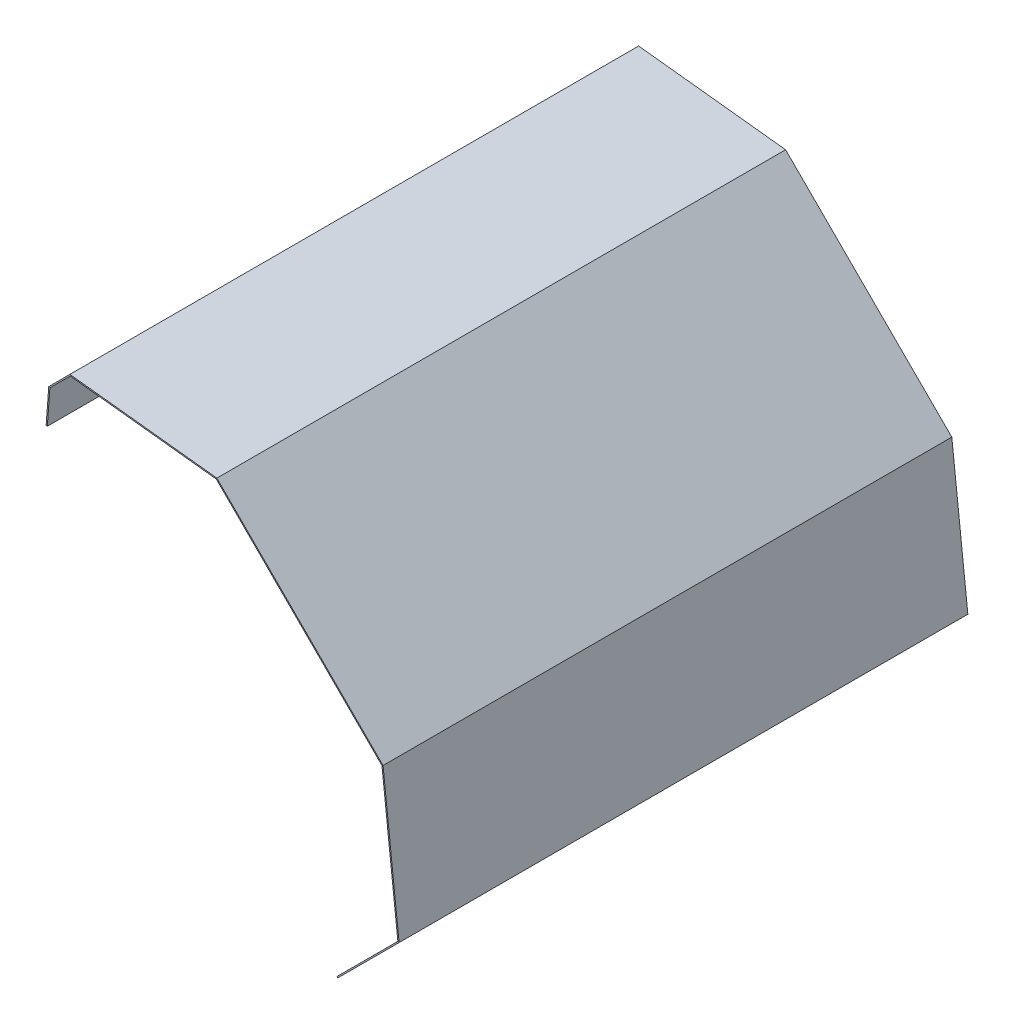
SolidWorks part; units mm, degrees
ref_plane "Plan de face" through (0, 0, 0) normal (0, 0, 1) x (1, 0, 0)
ref_plane "Plan de dessus" through (0, 0, 0) normal (0, 1, 0) x (1, 0, 0)
ref_plane "Plan de droite" through (0, 0, 0) normal (1, 0, 0) x (0, 0, -1)
sketch "Model" plane through (0, 0, 0) normal (0, 0, 1) x (1, 0, 0)
  line L0 (186.6093, 16.2158) -> (186.6093, 20.0238)
  line L1 (184.4172, 22.2158) -> (168.6803, 22.2158)
  line L2 (158.8824, 30.2158) -> (131.6093, 30.2158)
  line L3 (131.6093, 30.2158) -> (131.6093, 34.0238)
  line L4 (129.4172, 36.2158) -> (113.8013, 36.2158)
  line L5 (111.6093, 34.0238) -> (111.6093, 30.2158)
  line L6 (111.6093, 30.2158) -> (102.6093, 30.2158)
  line L7 (102.6093, 30.2158) -> (102.6093, 34.0238)
  line L8 (100.4172, 36.2158) -> (97.6093, 36.2158)
  line L9 (97.6093, 36.2158) -> (97.6093, 39.0238)
  line L10 (95.4172, 41.2158) -> (91.6093, 41.2158)
  line L11 (91.6093, 41.2158) -> (91.6093, 50.2158)
  line L12 (91.6093, 50.2158) -> (95.4172, 50.2158)
  line L13 (97.6093, 52.4078) -> (97.6093, 68.0238)
  line L14 (95.4172, 70.2158) -> (91.6093, 70.2158)
  line L15 (91.6093, 70.2158) -> (91.6093, 190.2158)
  line L16 (91.6093, 190.2158) -> (95.4172, 190.2158)
  line L17 (97.6093, 192.4078) -> (97.6093, 208.0238)
  line L18 (95.4172, 210.2158) -> (91.6093, 210.2158)
  line L19 (91.6093, 210.2158) -> (91.6093, 219.2158)
  line L20 (91.6093, 219.2158) -> (95.4172, 219.2158)
  line L21 (97.6093, 221.4078) -> (97.6093, 224.2158)
  line L22 (97.6093, 224.2158) -> (100.4172, 224.2158)
  line L23 (102.6093, 226.4078) -> (102.6093, 230.2158)
  line L24 (102.6093, 230.2158) -> (111.6093, 230.2158)
  line L25 (111.6093, 230.2158) -> (111.6093, 226.4078)
  line L26 (113.8013, 224.2158) -> (129.4172, 224.2158)
  line L27 (131.6093, 226.4078) -> (131.6093, 230.2158)
  line L28 (131.6093, 230.2158) -> (301.6093, 230.2158)
  line L29 (301.6093, 230.2158) -> (301.6093, 226.4078)
  line L30 (303.8013, 224.2158) -> (319.4172, 224.2158)
  line L31 (321.6093, 226.4078) -> (321.6093, 230.2158)
  line L32 (321.6093, 230.2158) -> (330.6093, 230.2158)
  line L33 (330.6093, 230.2158) -> (330.6093, 226.4078)
  line L34 (332.8013, 224.2158) -> (335.6093, 224.2158)
  line L35 (335.6093, 224.2158) -> (335.6093, 221.4078)
  line L36 (337.8013, 219.2158) -> (341.6093, 219.2158)
  line L37 (341.6093, 219.2158) -> (341.6093, 210.2158)
  line L38 (341.6093, 210.2158) -> (337.8013, 210.2158)
  line L39 (335.6093, 208.0238) -> (335.6093, 192.4078)
  line L40 (337.8013, 190.2158) -> (341.6093, 190.2158)
  line L41 (341.6093, 190.2158) -> (341.6093, 70.2158)
  line L42 (341.6093, 70.2158) -> (337.8013, 70.2158)
  line L43 (335.6093, 68.0238) -> (335.6093, 52.4078)
  line L44 (337.8013, 50.2158) -> (341.6093, 50.2158)
  line L45 (341.6093, 50.2158) -> (341.6093, 41.2158)
  line L46 (341.6093, 41.2158) -> (337.8013, 41.2158)
  line L47 (335.6093, 39.0238) -> (335.6093, 36.2158)
  line L48 (335.6093, 36.2158) -> (332.8013, 36.2158)
  line L49 (330.6093, 34.0238) -> (330.6093, 30.2158)
  line L50 (330.6093, 30.2158) -> (321.6093, 30.2158)
  line L51 (321.6093, 30.2158) -> (321.6093, 34.0238)
  line L52 (319.4172, 36.2158) -> (303.8013, 36.2158)
  line L53 (301.6093, 34.0238) -> (301.6093, 30.2158)
  line L54 (301.6093, 30.2158) -> (274.3362, 30.2158)
  line L55 (264.5382, 22.2158) -> (248.8013, 22.2158)
  line L56 (246.6093, 20.0238) -> (246.6093, 16.2158)
  line L57 (246.6093, 16.2158) -> (224.1093, 16.2158)
  line L58 (224.1093, 16.2158) -> (224.1093, 20.0238)
  line L59 (221.9172, 22.2158) -> (211.3013, 22.2158)
  line L60 (209.1093, 20.0238) -> (209.1093, 16.2158)
  line L61 (209.1093, 16.2158) -> (186.6093, 16.2158)
  line L62 (109.4172, 297.0142) -> (104.8013, 297.0142)
  line L63 (102.6093, 294.8222) -> (102.6093, 293.2062)
  line L64 (104.8013, 291.0142) -> (109.4172, 291.0142)
  line L65 (111.6093, 293.2062) -> (111.6093, 294.8222)
  line L66 (109.4172, 480.9142) -> (104.8013, 480.9142)
  line L67 (102.6093, 478.7222) -> (102.6093, 477.1062)
  line L68 (104.8013, 474.9142) -> (109.4172, 474.9142)
  line L69 (111.6093, 477.1062) -> (111.6093, 478.7222)
  line L70 (323.8013, 297.0142) -> (328.4172, 297.0142)
  line L71 (330.6093, 294.8222) -> (330.6093, 293.2062)
  line L72 (328.4172, 291.0142) -> (323.8013, 291.0142)
  line L73 (321.6093, 293.2062) -> (321.6093, 294.8222)
  line L74 (323.8013, 480.9142) -> (328.4172, 480.9142)
  line L75 (330.6093, 478.7222) -> (330.6093, 477.1062)
  line L76 (328.4172, 474.9142) -> (323.8013, 474.9142)
  line L77 (321.6093, 477.1062) -> (321.6093, 478.7222)
  line L78 (401.573, -34.6899) -> (401.5727, -30.074)
  line L79 (399.3806, -27.8821) -> (397.7646, -27.8822)
  line L80 (395.5727, -30.0743) -> (395.573, -34.6903)
  line L81 (397.7651, -36.8822) -> (399.3811, -36.8821)
  line L82 (585.473, -34.6793) -> (585.4727, -30.0634)
  line L83 (583.2806, -27.8715) -> (581.6646, -27.8716)
  line L84 (579.4727, -30.0637) -> (579.473, -34.6797)
  line L85 (581.6651, -36.8716) -> (583.2811, -36.8715)
  line L86 (401.5824, -198.7157) -> (401.5827, -203.3316)
  line L87 (399.3908, -205.5238) -> (397.7749, -205.5239)
  line L88 (395.5827, -203.332) -> (395.5824, -198.7161)
  line L89 (397.7743, -196.5239) -> (399.3903, -196.5238)
  line L90 (401.3762, -59.057) -> (401.3711, -174.3561)
  line L91 (399.1766, -176.5457) -> (397.5607, -176.5439)
  line L92 (395.3711, -174.3494) -> (395.3762, -59.0503)
  line L93 (397.5707, -56.8607) -> (399.1867, -56.8626)
  line L94 (585.4824, -198.7051) -> (585.4827, -203.3211)
  line L95 (583.2908, -205.5132) -> (581.6749, -205.5133)
  line L96 (579.4827, -203.3214) -> (579.4824, -198.7055)
  line L97 (581.6743, -196.5133) -> (583.2903, -196.5132)
  line L98 (400.5137, 48.382) -> (400.5137, 43.7661)
  line L99 (398.3216, 41.5741) -> (396.7057, 41.5741)
  line L100 (394.5137, 43.7661) -> (394.5137, 48.382)
  line L101 (396.7057, 50.5741) -> (398.3216, 50.5741)
  line L102 (584.4137, 48.382) -> (584.4137, 43.7661)
  line L103 (582.2216, 41.5741) -> (580.6057, 41.5741)
  line L104 (578.4137, 43.7661) -> (578.4137, 48.382)
  line L105 (580.6057, 50.5741) -> (582.2216, 50.5741)
  line L106 (520.3984, 177.3385) -> (529.002, 177.3385)
  line L107 (531.194, 175.1465) -> (531.194, 173.9625)
  line L108 (529.002, 171.7705) -> (520.3984, 171.7705)
  line L109 (518.2063, 173.9625) -> (518.2063, 175.1465)
  line L110 (394.5137, 190.2158) -> (400.5137, 190.2158)
  line L111 (415.5137, 205.2158) -> (594.4137, 205.2158)
  line L112 (594.4137, 205.2158) -> (594.4137, 207.7158)
  line L113 (594.4137, 227.7158) -> (594.4137, 230.2158)
  line L114 (594.4137, 230.2158) -> (536.9137, 230.2158)
  line L115 (536.9137, 230.2158) -> (536.9137, 226.4078)
  line L116 (534.7216, 224.2158) -> (486.6057, 224.2158)
  line L117 (484.4137, 226.4078) -> (484.4137, 230.2158)
  line L118 (484.4137, 230.2158) -> (431.9137, 230.2158)
  line L119 (431.9137, 230.2158) -> (431.9137, 226.4078)
  line L120 (429.7216, 224.2158) -> (379.4137, 224.2158)
  line L121 (379.4137, 224.2158) -> (379.4137, 205.2158)
  line L122 (379.4137, 205.2158) -> (379.4137, 55.5741)
  line L123 (379.4137, 55.5741) -> (379.4137, 36.5741)
  line L124 (379.4137, 36.5741) -> (429.7216, 36.5741)
  line L125 (431.9137, 34.382) -> (431.9137, 30.5741)
  line L126 (431.9137, 30.5741) -> (484.4137, 30.5741)
  line L127 (484.4137, 30.5741) -> (484.4137, 34.382)
  line L128 (486.6057, 36.5741) -> (534.7216, 36.5741)
  line L129 (536.9137, 34.382) -> (536.9137, 30.5741)
  line L130 (536.9137, 30.5741) -> (589.4137, 30.5741)
  line L131 (589.4137, 30.5741) -> (589.4137, 55.5741)
  line L132 (589.4137, 55.5741) -> (415.5137, 55.5741)
  line L133 (400.5137, 70.5741) -> (394.5137, 70.5741)
  line L134 (394.5137, 70.5741) -> (394.5137, 190.2158)
  line L135 (400.5137, 212.4078) -> (400.5137, 217.0238)
  line L136 (398.3216, 219.2158) -> (396.7057, 219.2158)
  line L137 (394.5137, 217.0238) -> (394.5137, 212.4078)
  line L138 (396.7057, 210.2158) -> (398.3216, 210.2158)
  line L139 (584.4137, 212.4078) -> (584.4137, 217.0238)
  line L140 (582.2216, 219.2158) -> (580.6057, 219.2158)
  line L141 (578.4137, 217.0238) -> (578.4137, 212.4078)
  line L142 (580.6057, 210.2158) -> (582.2216, 210.2158)
  line L143 (109.4172, -38.0019) -> (104.8013, -38.0019)
  line L144 (102.6093, -35.8099) -> (102.6093, -34.1939)
  line L145 (104.8013, -32.0019) -> (109.4172, -32.0019)
  line L146 (111.6093, -34.1939) -> (111.6093, -35.8099)
  line L147 (109.4172, -221.9019) -> (104.8013, -221.9019)
  line L148 (102.6093, -219.7099) -> (102.6093, -218.0939)
  line L149 (104.8013, -215.9019) -> (109.4172, -215.9019)
  line L150 (111.6093, -218.0939) -> (111.6093, -219.7099)
  line L151 (323.8036, -38.0019) -> (328.4195, -38.0019)
  line L152 (330.6116, -35.8099) -> (330.6116, -34.1939)
  line L153 (328.4195, -32.0019) -> (323.8036, -32.0019)
  line L154 (321.6116, -34.1939) -> (321.6116, -35.8099)
  line L155 (323.8036, -221.9019) -> (328.4195, -221.9019)
  line L156 (330.6116, -219.7099) -> (330.6116, -218.0939)
  line L157 (328.4195, -215.9019) -> (323.8036, -215.9019)
  line L158 (321.6116, -218.0939) -> (321.6116, -219.7099)
  line L159 (147.1974, 453.7889) -> (147.1974, 454.8244)
  line L160 (150.1264, 461.8955) -> (152.7062, 464.4753)
  line L161 (164.9693, 468.777) -> (216.2141, 463.0831)
  line L162 (225.1642, 458.7815) -> (288.4337, 395.512)
  line L163 (292.7354, 386.5619) -> (298.4292, 335.3171)
  line L164 (294.1276, 323.054) -> (270.9411, 299.8675)
  line L165 (270.9411, 299.8675) -> (263.1629, 307.6457)
  line L166 (263.1629, 307.6457) -> (265.8556, 310.3383)
  line L167 (265.8556, 313.4383) -> (262.5916, 316.7023)
  line L168 (259.4916, 316.7023) -> (256.799, 314.0096)
  line L169 (256.799, 314.0096) -> (147.1974, 423.6112)
  line L170 (147.1974, 423.6112) -> (149.183, 425.5967)
  line L171 (149.183, 428.6967) -> (148.9652, 428.9145)
  line L172 (217.1828, 450.9016) -> (212.5951, 451.4114)
  line L173 (210.1744, 449.4748) -> (209.9959, 447.8688)
  line L174 (211.9325, 445.4481) -> (216.5202, 444.9383)
  line L175 (218.9409, 446.8749) -> (219.1193, 448.481)
  line L176 (274.5906, 386.8679) -> (275.1003, 382.2802)
  line L177 (277.521, 380.3437) -> (279.1271, 380.5221)
  line L178 (281.0636, 382.9428) -> (280.5539, 387.5305)
  line L179 (278.1332, 389.4671) -> (276.5272, 389.2886)
  line L180 (143.4441, 440.7995) -> (146.7081, 437.5356)
  line L181 (149.8081, 437.5356) -> (150.9507, 438.6782)
  line L182 (150.9507, 441.7782) -> (147.6868, 445.0422)
  line L183 (144.5868, 445.0422) -> (143.4441, 443.8995)
  line L184 (289.7295, -55.6866) -> (289.7295, -54.6511)
  line L185 (286.8006, -47.58) -> (284.2207, -45.0001)
  line L186 (271.9576, -40.6985) -> (220.7128, -46.3923)
  line L187 (211.7627, -50.694) -> (148.4932, -113.9635)
  line L188 (144.1916, -122.9136) -> (138.4977, -174.1584)
  line L189 (142.7993, -186.4215) -> (165.9858, -209.6079)
  line L190 (165.9858, -209.6079) -> (173.764, -201.8298)
  line L191 (173.764, -201.8298) -> (171.0714, -199.1371)
  line L192 (171.0714, -196.0371) -> (174.3353, -192.7732)
  line L193 (177.4353, -192.7732) -> (180.128, -195.4658)
  line L194 (180.128, -195.4658) -> (289.7295, -85.8643)
  line L195 (289.7295, -85.8643) -> (287.744, -83.8787)
  line L196 (287.744, -80.7787) -> (287.9617, -80.561)
  line L197 (219.7442, -58.5738) -> (224.3319, -58.0641)
  line L198 (226.7526, -60.0006) -> (226.931, -61.6067)
  line L199 (224.9944, -64.0274) -> (220.4067, -64.5371)
  line L200 (217.9861, -62.6006) -> (217.8076, -60.9945)
  line L201 (162.3363, -122.6075) -> (161.8266, -127.1952)
  line L202 (159.4059, -129.1318) -> (157.7998, -128.9533)
  line L203 (155.8633, -126.5326) -> (156.373, -121.9449)
  line L204 (158.7937, -120.0084) -> (160.3998, -120.1868)
  line L205 (293.4828, -68.6759) -> (290.2188, -71.9399)
  line L206 (287.1188, -71.9399) -> (285.9762, -70.7972)
  line L207 (285.9762, -67.6972) -> (289.2402, -64.4333)
  line L208 (292.3402, -64.4333) -> (293.4828, -65.5759)
  line L209 (403.5081, 170.0545) -> (399.7002, 170.0545)
  line L210 (399.7002, 170.0545) -> (399.7002, 179.0545)
  line L211 (399.7002, 179.0545) -> (403.5081, 179.0545)
  line L212 (405.7002, 181.2465) -> (405.7002, 184.0545)
  line L213 (405.7002, 184.0545) -> (643.7002, 184.0545)
  line L214 (643.7002, 184.0545) -> (643.7002, 181.2465)
  line L215 (645.8922, 179.0545) -> (649.7002, 179.0545)
  line L216 (649.7002, 179.0545) -> (649.7002, 170.0545)
  line L217 (649.7002, 170.0545) -> (645.8922, 170.0545)
  line L218 (643.7002, 167.8625) -> (643.7002, 165.0545)
  line L219 (643.7002, 165.0545) -> (405.7002, 165.0545)
  line L220 (405.7002, 165.0545) -> (405.7002, 167.8625)
  line L221 (520.3984, 148.2673) -> (529.002, 148.2673)
  line L222 (531.194, 146.0752) -> (531.194, 144.8913)
  line L223 (529.002, 142.6993) -> (520.3984, 142.6993)
  line L224 (518.2063, 144.8913) -> (518.2063, 146.0752)
  line L225 (403.5081, 140.9833) -> (399.7002, 140.9833)
  line L226 (399.7002, 140.9833) -> (399.7002, 149.9833)
  line L227 (399.7002, 149.9833) -> (403.5081, 149.9833)
  line L228 (405.7002, 152.1753) -> (405.7002, 154.9833)
  line L229 (405.7002, 154.9833) -> (643.7002, 154.9833)
  line L230 (643.7002, 154.9833) -> (643.7002, 152.1753)
  line L231 (645.8922, 149.9833) -> (649.7002, 149.9833)
  line L232 (649.7002, 149.9833) -> (649.7002, 140.9833)
  line L233 (649.7002, 140.9833) -> (645.8922, 140.9833)
  line L234 (643.7002, 138.7912) -> (643.7002, 135.9833)
  line L235 (643.7002, 135.9833) -> (405.7002, 135.9833)
  line L236 (405.7002, 135.9833) -> (405.7002, 138.7912)
  line L237 (337.8013, 380.9142) -> (341.6093, 380.9142)
  line L238 (341.6093, 380.9142) -> (341.6093, 433.4142)
  line L239 (341.6093, 433.4142) -> (337.8013, 433.4142)
  line L240 (335.6093, 435.6062) -> (335.6093, 488.4142)
  line L241 (335.6093, 488.4142) -> (335.6093, 498.4142)
  line L242 (335.6093, 498.4142) -> (316.6092, 498.4142)
  line L243 (316.6092, 498.4142) -> (116.6093, 498.4142)
  line L244 (116.6093, 498.4142) -> (97.6093, 498.4142)
  line L245 (97.6093, 498.4142) -> (97.6093, 488.4142)
  line L246 (97.6093, 488.4142) -> (97.6093, 435.6062)
  line L247 (95.4172, 433.4142) -> (91.6093, 433.4142)
  line L248 (91.6093, 433.4142) -> (91.6093, 380.9142)
  line L249 (91.6093, 380.9142) -> (95.4172, 380.9142)
  line L250 (97.6093, 378.7221) -> (97.6093, 330.6062)
  line L251 (95.4172, 328.4142) -> (91.6093, 328.4142)
  line L252 (91.6093, 328.4142) -> (91.6093, 275.9142)
  line L253 (91.6093, 275.9142) -> (116.6093, 275.9142)
  line L254 (116.6093, 275.9142) -> (316.6092, 275.9142)
  line L255 (316.6092, 275.9142) -> (341.6093, 275.9142)
  line L256 (341.6093, 275.9142) -> (341.6093, 328.4142)
  line L257 (341.6093, 328.4142) -> (337.8013, 328.4142)
  line L258 (335.6093, 330.6062) -> (335.6093, 378.7221)
  line L259 (316.6092, 488.405) -> (316.6092, 488.4142)
  line L260 (316.6092, 488.4142) -> (316.598, 488.4142)
  line L261 (314.4172, 488.4142) -> (314.3633, 488.4142)
  line L262 (314.3633, 488.4142) -> (118.8552, 488.4142)
  line L263 (118.8552, 488.4142) -> (118.8013, 488.4142)
  line L264 (116.6206, 488.4142) -> (116.6093, 488.4142)
  line L265 (116.6093, 488.4142) -> (116.6093, 488.405)
  line L266 (116.6093, 486.213) -> (116.6093, 312.0142)
  line L267 (131.6093, 297.0142) -> (131.6093, 293.2062)
  line L268 (133.8013, 291.0142) -> (299.4172, 291.0142)
  line L269 (301.6093, 293.2062) -> (301.6093, 297.0142)
  line L270 (316.6092, 312.0142) -> (316.6092, 486.213)
  line L271 (508.4445, -182.4016) -> (495.4438, -169.4024)
  line L272 (495.4438, -169.4024) -> (495.4435, -164.2024)
  line L273 (495.4435, -164.2024) -> (498.8964, -164.2022)
  line L274 (500.4433, -161.21) -> (500.4431, -157.4021)
  line L275 (500.4431, -157.4021) -> (509.4431, -157.4015)
  line L276 (509.4431, -157.4015) -> (509.4433, -161.2095)
  line L277 (511.6355, -163.4014) -> (514.4434, -163.4013)
  line L278 (514.4434, -163.4013) -> (514.4436, -166.2092)
  line L279 (516.6358, -168.4011) -> (520.4437, -168.4009)
  line L280 (520.4437, -168.4009) -> (520.4442, -177.4009)
  line L281 (520.4442, -177.4009) -> (516.6363, -177.4011)
  line L282 (513.6443, -178.9484) -> (513.6445, -182.4013)
  line L283 (513.6445, -182.4013) -> (508.4445, -182.4016)
  line L284 (542.4457, -182.3996) -> (529.445, -169.4004)
  line L285 (529.445, -169.4004) -> (529.4447, -164.2004)
  line L286 (529.4447, -164.2004) -> (532.8975, -164.2002)
  line L287 (534.4445, -161.2081) -> (534.4443, -157.4001)
  line L288 (534.4443, -157.4001) -> (543.4443, -157.3996)
  line L289 (543.4443, -157.3996) -> (543.4445, -161.2076)
  line L290 (545.6367, -163.3995) -> (548.4446, -163.3993)
  line L291 (548.4446, -163.3993) -> (548.4448, -166.2073)
  line L292 (550.6369, -168.3992) -> (554.4449, -168.399)
  line L293 (554.4449, -168.399) -> (554.4454, -177.399)
  line L294 (554.4454, -177.399) -> (550.6375, -177.3992)
  line L295 (547.6455, -178.9465) -> (547.6457, -182.3993)
  line L296 (547.6457, -182.3993) -> (542.4457, -182.3996)
  line L297 (576.4469, -182.3977) -> (563.4461, -169.3984)
  line L298 (563.4461, -169.3984) -> (563.4458, -164.1984)
  line L299 (563.4458, -164.1984) -> (566.8987, -164.1982)
  line L300 (568.4457, -161.2061) -> (568.4455, -157.3982)
  line L301 (568.4455, -157.3982) -> (577.4455, -157.3976)
  line L302 (577.4455, -157.3976) -> (577.4457, -161.2056)
  line L303 (579.6378, -163.3975) -> (582.4458, -163.3973)
  line L304 (582.4458, -163.3973) -> (582.446, -166.2053)
  line L305 (584.6381, -168.3972) -> (588.4461, -168.397)
  line L306 (588.4461, -168.397) -> (588.4466, -177.397)
  line L307 (588.4466, -177.397) -> (584.6386, -177.3972)
  line L308 (581.6467, -178.9445) -> (581.6469, -182.3974)
  line L309 (581.6469, -182.3974) -> (576.4469, -182.3977)
  line L310 (508.4425, -147.1448) -> (495.4418, -134.1455)
  line L311 (495.4418, -134.1455) -> (495.4415, -128.9455)
  line L312 (495.4415, -128.9455) -> (498.8943, -128.9453)
  line L313 (500.4413, -125.9532) -> (500.4411, -122.1452)
  line L314 (500.4411, -122.1452) -> (509.4411, -122.1447)
  line L315 (509.4411, -122.1447) -> (509.4413, -125.9527)
  line L316 (511.6334, -128.1446) -> (514.4414, -128.1444)
  line L317 (514.4414, -128.1444) -> (514.4416, -130.9524)
  line L318 (516.6337, -133.1443) -> (520.4417, -133.1441)
  line L319 (520.4417, -133.1441) -> (520.4422, -142.1441)
  line L320 (520.4422, -142.1441) -> (516.6342, -142.1443)
  line L321 (513.6423, -143.6916) -> (513.6425, -147.1445)
  line L322 (513.6425, -147.1445) -> (508.4425, -147.1448)
  line L323 (542.4437, -147.1428) -> (529.4429, -134.1436)
  line L324 (529.4429, -134.1436) -> (529.4426, -128.9436)
  line L325 (529.4426, -128.9436) -> (532.8955, -128.9434)
  line L326 (534.4425, -125.9512) -> (534.4422, -122.1433)
  line L327 (534.4422, -122.1433) -> (543.4422, -122.1428)
  line L328 (543.4422, -122.1428) -> (543.4425, -125.9507)
  line L329 (545.6346, -128.1426) -> (548.4426, -128.1425)
  line L330 (548.4426, -128.1425) -> (548.4428, -130.9504)
  line L331 (550.6349, -133.1423) -> (554.4429, -133.1421)
  line L332 (554.4429, -133.1421) -> (554.4434, -142.1421)
  line L333 (554.4434, -142.1421) -> (550.6354, -142.1423)
  line L334 (547.6435, -143.6896) -> (547.6437, -147.1425)
  line L335 (547.6437, -147.1425) -> (542.4437, -147.1428)
  line L336 (576.4449, -147.1409) -> (563.4441, -134.1416)
  line L337 (563.4441, -134.1416) -> (563.4438, -128.9416)
  line L338 (563.4438, -128.9416) -> (566.8967, -128.9414)
  line L339 (568.4436, -125.9493) -> (568.4434, -122.1413)
  line L340 (568.4434, -122.1413) -> (577.4434, -122.1408)
  line L341 (577.4434, -122.1408) -> (577.4436, -125.9488)
  line L342 (579.6358, -128.1407) -> (582.4438, -128.1405)
  line L343 (582.4438, -128.1405) -> (582.4439, -130.9485)
  line L344 (584.6361, -133.1404) -> (588.4441, -133.1402)
  line L345 (588.4441, -133.1402) -> (588.4446, -142.1402)
  line L346 (588.4446, -142.1402) -> (584.6366, -142.1404)
  line L347 (581.6447, -143.6877) -> (581.6449, -147.1406)
  line L348 (581.6449, -147.1406) -> (576.4449, -147.1409)
  line L349 (508.4405, -111.8879) -> (495.4397, -98.8887)
  line L350 (495.4397, -98.8887) -> (495.4394, -93.6887)
  line L351 (495.4394, -93.6887) -> (498.8923, -93.6885)
  line L352 (500.4393, -90.6964) -> (500.439, -86.8884)
  line L353 (500.439, -86.8884) -> (509.439, -86.8879)
  line L354 (509.439, -86.8879) -> (509.4393, -90.6958)
  line L355 (511.6314, -92.8877) -> (514.4394, -92.8876)
  line L356 (514.4394, -92.8876) -> (514.4395, -95.6956)
  line L357 (516.6317, -97.8875) -> (520.4397, -97.8872)
  line L358 (520.4397, -97.8872) -> (520.4402, -106.8872)
  line L359 (520.4402, -106.8872) -> (516.6322, -106.8875)
  line L360 (513.6403, -108.4348) -> (513.6405, -111.8876)
  line L361 (513.6405, -111.8876) -> (508.4405, -111.8879)
  line L362 (542.4417, -111.886) -> (529.4409, -98.8867)
  line L363 (529.4409, -98.8867) -> (529.4406, -93.6867)
  line L364 (529.4406, -93.6867) -> (532.8935, -93.6865)
  line L365 (534.4404, -90.6944) -> (534.4402, -86.8864)
  line L366 (534.4402, -86.8864) -> (543.4402, -86.8859)
  line L367 (543.4402, -86.8859) -> (543.4404, -90.6939)
  line L368 (545.6326, -92.8858) -> (548.4406, -92.8856)
  line L369 (548.4406, -92.8856) -> (548.4407, -95.6936)
  line L370 (550.6329, -97.8855) -> (554.4408, -97.8853)
  line L371 (554.4408, -97.8853) -> (554.4414, -106.8853)
  line L372 (554.4414, -106.8853) -> (550.6334, -106.8855)
  line L373 (547.6415, -108.4328) -> (547.6417, -111.8857)
  line L374 (547.6417, -111.8857) -> (542.4417, -111.886)
  line L375 (576.4428, -111.884) -> (563.4421, -98.8848)
  line L376 (563.4421, -98.8848) -> (563.4418, -93.6848)
  line L377 (563.4418, -93.6848) -> (566.8947, -93.6846)
  line L378 (568.4416, -90.6924) -> (568.4414, -86.8845)
  line L379 (568.4414, -86.8845) -> (577.4414, -86.884)
  line L380 (577.4414, -86.884) -> (577.4416, -90.6919)
  line L381 (579.6338, -92.8838) -> (582.4417, -92.8837)
  line L382 (582.4417, -92.8837) -> (582.4419, -95.6916)
  line L383 (584.6341, -97.8835) -> (588.442, -97.8833)
  line L384 (588.442, -97.8833) -> (588.4425, -106.8833)
  line L385 (588.4425, -106.8833) -> (584.6346, -106.8835)
  line L386 (581.6426, -108.4308) -> (581.6428, -111.8837)
  line L387 (581.6428, -111.8837) -> (576.4428, -111.884)
  line L388 (508.4384, -76.6311) -> (495.4377, -63.6318)
  line L389 (495.4377, -63.6318) -> (495.4374, -58.4318)
  line L390 (495.4374, -58.4318) -> (498.8903, -58.4316)
  line L391 (500.4372, -55.4395) -> (500.437, -51.6316)
  line L392 (500.437, -51.6316) -> (509.437, -51.631)
  line L393 (509.437, -51.631) -> (509.4372, -55.439)
  line L394 (511.6294, -57.6309) -> (514.4373, -57.6307)
  line L395 (514.4373, -57.6307) -> (514.4375, -60.4387)
  line L396 (516.6297, -62.6306) -> (520.4376, -62.6304)
  line L397 (520.4376, -62.6304) -> (520.4382, -71.6304)
  line L398 (520.4382, -71.6304) -> (516.6302, -71.6306)
  line L399 (513.6382, -73.1779) -> (513.6384, -76.6308)
  line L400 (513.6384, -76.6308) -> (508.4384, -76.6311)
  line L401 (542.4396, -76.6291) -> (529.4389, -63.6299)
  line L402 (529.4389, -63.6299) -> (529.4386, -58.4299)
  line L403 (529.4386, -58.4299) -> (532.8914, -58.4297)
  line L404 (534.4384, -55.4376) -> (534.4382, -51.6296)
  line L405 (534.4382, -51.6296) -> (543.4382, -51.6291)
  line L406 (543.4382, -51.6291) -> (543.4384, -55.437)
  line L407 (545.6306, -57.629) -> (548.4385, -57.6288)
  line L408 (548.4385, -57.6288) -> (548.4387, -60.4368)
  line L409 (550.6308, -62.6287) -> (554.4388, -62.6284)
  line L410 (554.4388, -62.6284) -> (554.4393, -71.6284)
  line L411 (554.4393, -71.6284) -> (550.6314, -71.6287)
  line L412 (547.6394, -73.176) -> (547.6396, -76.6288)
  line L413 (547.6396, -76.6288) -> (542.4396, -76.6291)
  line L414 (576.4408, -76.6272) -> (563.4401, -63.6279)
  line L415 (563.4401, -63.6279) -> (563.4398, -58.4279)
  line L416 (563.4398, -58.4279) -> (566.8926, -58.4277)
  line L417 (568.4396, -55.4356) -> (568.4394, -51.6276)
  line L418 (568.4394, -51.6276) -> (577.4394, -51.6271)
  line L419 (577.4394, -51.6271) -> (577.4396, -55.4351)
  line L420 (579.6317, -57.627) -> (582.4397, -57.6268)
  line L421 (582.4397, -57.6268) -> (582.4399, -60.4348)
  line L422 (584.632, -62.6267) -> (588.44, -62.6265)
  line L423 (588.44, -62.6265) -> (588.4405, -71.6265)
  line L424 (588.4405, -71.6265) -> (584.6325, -71.6267)
  line L425 (581.6406, -73.174) -> (581.6408, -76.6269)
  line L426 (581.6408, -76.6269) -> (576.4408, -76.6272)
  line L427 (337.8036, -69.4019) -> (341.6116, -69.4019)
  line L428 (341.6116, -69.4019) -> (341.6116, -16.9019)
  line L429 (341.6116, -16.9019) -> (316.6116, -16.9019)
  line L430 (316.6116, -16.9019) -> (116.6093, -16.9019)
  line L431 (116.6093, -16.9019) -> (91.6093, -16.9019)
  line L432 (91.6093, -16.9019) -> (91.6093, -69.4019)
  line L433 (91.6093, -69.4019) -> (95.4172, -69.4019)
  line L434 (97.6093, -71.5939) -> (97.6093, -119.7099)
  line L435 (95.4172, -121.9019) -> (91.6093, -121.9019)
  line L436 (91.6093, -121.9019) -> (91.6093, -174.4019)
  line L437 (91.6093, -174.4019) -> (95.4172, -174.4019)
  line L438 (97.6093, -176.5939) -> (97.6093, -216.9019)
  line L439 (97.6093, -216.9019) -> (97.6093, -226.9019)
  line L440 (97.6093, -226.9019) -> (335.6116, -226.9019)
  line L441 (335.6116, -226.9019) -> (335.6116, -216.9019)
  line L442 (335.6116, -216.9019) -> (335.6116, -176.5939)
  line L443 (337.8036, -174.4019) -> (341.6116, -174.4019)
  line L444 (341.6116, -174.4019) -> (341.6116, -121.9019)
  line L445 (341.6116, -121.9019) -> (337.8036, -121.9019)
  line L446 (335.6116, -119.7099) -> (335.6116, -71.5939)
  line L447 (316.6092, -216.8969) -> (316.6092, -216.9061)
  line L448 (316.6092, -216.9061) -> (316.598, -216.9061)
  line L449 (314.4172, -216.9061) -> (314.3633, -216.9061)
  line L450 (314.3633, -216.9061) -> (118.8552, -216.9061)
  line L451 (118.8552, -216.9061) -> (118.8013, -216.9061)
  line L452 (116.6206, -216.9061) -> (116.6093, -216.9061)
  line L453 (116.6093, -216.9061) -> (116.6093, -216.8969)
  line L454 (116.6093, -214.7048) -> (116.6093, -53.0019)
  line L455 (131.6093, -38.0019) -> (131.6093, -34.1939)
  line L456 (133.8013, -32.0019) -> (299.4172, -32.0019)
  line L457 (301.6093, -34.1939) -> (301.6093, -38.0019)
  line L458 (316.6092, -53.0019) -> (316.6092, -214.7048)
  line L459 (432.9832, -212.7139) -> (432.9835, -216.5219)
  line L460 (432.9835, -216.5219) -> (485.4835, -216.5188)
  line L461 (485.4835, -216.5188) -> (485.4832, -212.7109)
  line L462 (487.6751, -210.5187) -> (535.7911, -210.516)
  line L463 (537.9832, -212.7079) -> (537.9835, -216.5158)
  line L464 (537.9835, -216.5158) -> (595.4835, -216.5125)
  line L465 (595.4835, -216.5125) -> (595.4833, -214.0125)
  line L466 (595.4822, -194.0125) -> (595.482, -191.5125)
  line L467 (595.482, -191.5125) -> (484.2168, -191.5189)
  line L468 (482.0258, -189.3261) -> (482.0174, -44.0697)
  line L469 (484.2089, -41.8772) -> (590.4734, -41.8711)
  line L470 (590.4734, -41.8711) -> (590.472, -16.8711)
  line L471 (590.472, -16.8711) -> (537.972, -16.8741)
  line L472 (537.972, -16.8741) -> (537.9722, -20.6821)
  line L473 (535.7803, -22.8742) -> (487.6643, -22.877)
  line L474 (485.4722, -20.6851) -> (485.472, -16.8771)
  line L475 (485.472, -16.8771) -> (432.972, -16.8801)
  line L476 (432.972, -16.8801) -> (432.9722, -20.6881)
  line L477 (430.7803, -22.8803) -> (380.4723, -22.8832)
  line L478 (380.4723, -22.8832) -> (380.4734, -41.8832)
  line L479 (380.4734, -41.8832) -> (380.482, -191.5249)
  line L480 (380.482, -191.5249) -> (380.4831, -210.5249)
  line L481 (380.4831, -210.5249) -> (430.7911, -210.522)
  line L482 (405.7002, 116.912) -> (399.7002, 116.912)
  line L483 (399.7002, 116.912) -> (399.7002, 125.912)
  line L484 (399.7002, 125.912) -> (649.7002, 125.912)
  line L485 (649.7002, 125.912) -> (649.7002, 116.912)
  line L486 (649.7002, 116.912) -> (643.7002, 116.912)
  line L487 (643.7002, 116.912) -> (643.7002, 109.1511)
  line L488 (643.7002, 109.1511) -> (405.7002, 109.1511)
  line L489 (405.7002, 109.1511) -> (405.7002, 116.912)
  line L490 (405.7002, 120.912) -> (643.7002, 120.912)
  line L491 (643.7002, 120.912) -> (643.7002, 121.912)
  line L492 (643.7002, 121.912) -> (405.7002, 121.912)
  line L493 (405.7002, 121.912) -> (405.7002, 120.912)
  line L494 (405.7002, 74.9578) -> (405.7002, 78.1416)
  line L495 (405.7002, 78.1416) -> (405.7002, 79.1416)
  line L496 (405.7002, 79.1416) -> (405.7002, 85.9578)
  line L497 (405.7002, 85.9578) -> (399.7002, 85.9578)
  line L498 (399.7002, 85.9578) -> (399.7002, 94.9578)
  line L499 (399.7002, 94.9578) -> (405.7002, 94.9578)
  line L500 (405.7002, 94.9578) -> (405.7002, 99.9578)
  line L501 (405.7002, 99.9578) -> (643.7002, 99.9578)
  line L502 (643.7002, 99.9578) -> (643.7002, 94.9578)
  line L503 (643.7002, 94.9578) -> (649.7002, 94.9578)
  line L504 (649.7002, 94.9578) -> (649.7002, 85.9578)
  line L505 (649.7002, 85.9578) -> (643.7002, 85.9578)
  line L506 (643.7002, 85.9578) -> (643.7002, 79.1416)
  line L507 (643.7002, 79.1416) -> (643.7002, 78.1416)
  line L508 (643.7002, 78.1416) -> (643.7002, 74.9578)
  line L509 (643.7002, 74.9578) -> (405.7002, 74.9578)
  line L510 (643.7002, 78.1416) -> (405.7002, 78.1416)
  line L511 (405.7002, 78.1416) -> (405.7002, 79.1416)
  line L512 (405.7002, 79.1416) -> (643.7002, 79.1416)
  line L513 (643.7002, 79.1416) -> (643.7002, 78.1416)
  line L514 (401.5344, -56.9067) -> (395.5344, -56.9)
  line L515 (395.5344, -56.9) -> (395.401, -176.5416)
  line L516 (395.401, -176.5416) -> (401.401, -176.5483)
  line L517 (401.401, -176.5483) -> (401.5344, -56.9067)
  line L518 (166.4492, -204.902) -> (140.9151, -179.3875)
  line L519 (140.9151, -179.3875) -> (147.5918, -118.9776)
  line L520 (147.5918, -118.9776) -> (216.893, -49.8593)
  line L521 (216.893, -49.8593) -> (277.9889, -43.0585)
  line L522 (277.9889, -43.0585) -> (286.534, -51.6035)
  line L523 (286.534, -51.6035) -> (287.6082, -66.0653)
  line L524 (270.4778, 304.5735) -> (296.0118, 330.0879)
  line L525 (296.0118, 330.0879) -> (289.3352, 390.4979)
  line L526 (289.3352, 390.4979) -> (220.0339, 459.6162)
  line L527 (220.0339, 459.6162) -> (158.938, 466.417)
  line L528 (158.938, 466.417) -> (150.393, 457.8719)
  line L529 (150.393, 457.8719) -> (149.3187, 443.4102)
  spline S0 degree 3 poles (186.6093, 20.0238) (187.2146, 20.6291) (187.2146, 21.6105) (186.6093, 22.2158) knots 1 1 1 1 2 2 2 2
  spline S1 degree 3 poles (186.6093, 22.2158) (186.0039, 22.8211) (185.0225, 22.8211) (184.4172, 22.2158) knots 2 2 2 2 3 3 3 3
  spline S2 degree 3 poles (168.6803, 22.2158) (167.7299, 26.8717) (163.6343, 30.2158) (158.8824, 30.2158) knots 4 4 4 4 5 5 5 5
  spline S3 degree 3 poles (131.6093, 34.0238) (132.2146, 34.6291) (132.2146, 35.6105) (131.6093, 36.2158) knots 7 7 7 7 8 8 8 8
  spline S4 degree 3 poles (131.6093, 36.2158) (131.0039, 36.8211) (130.0225, 36.8211) (129.4172, 36.2158) knots 8 8 8 8 9 9 9 9
  spline S5 degree 3 poles (113.8013, 36.2158) (113.196, 36.8211) (112.2146, 36.8211) (111.6093, 36.2158) knots 10 10 10 10 11 11 11 11
  spline S6 degree 3 poles (111.6093, 36.2158) (111.0039, 35.6105) (111.0039, 34.6291) (111.6093, 34.0238) knots 11 11 11 11 12 12 12 12
  spline S7 degree 3 poles (102.6093, 34.0238) (103.2146, 34.6291) (103.2146, 35.6105) (102.6093, 36.2158) knots 15 15 15 15 16 16 16 16
  spline S8 degree 3 poles (102.6093, 36.2158) (102.0039, 36.8211) (101.0225, 36.8211) (100.4172, 36.2158) knots 16 16 16 16 17 17 17 17
  spline S9 degree 3 poles (97.6093, 39.0238) (98.2146, 39.6291) (98.2146, 40.6105) (97.6093, 41.2158) knots 19 19 19 19 20 20 20 20
  spline S10 degree 3 poles (97.6093, 41.2158) (97.0039, 41.8211) (96.0225, 41.8211) (95.4172, 41.2158) knots 20 20 20 20 21 21 21 21
  spline S11 degree 3 poles (95.4172, 50.2158) (96.0225, 49.6105) (97.0039, 49.6105) (97.6093, 50.2158) knots 24 24 24 24 25 25 25 25
  spline S12 degree 3 poles (97.6093, 50.2158) (98.2146, 50.8211) (98.2146, 51.8025) (97.6093, 52.4078) knots 25 25 25 25 26 26 26 26
  spline S13 degree 3 poles (97.6093, 68.0238) (98.2146, 68.6291) (98.2146, 69.6105) (97.6093, 70.2158) knots 27 27 27 27 28 28 28 28
  spline S14 degree 3 poles (97.6093, 70.2158) (97.0039, 70.8211) (96.0225, 70.8211) (95.4172, 70.2158) knots 28 28 28 28 29 29 29 29
  spline S15 degree 3 poles (95.4172, 190.2158) (96.0225, 189.6105) (97.0039, 189.6105) (97.6093, 190.2158) knots 32 32 32 32 33 33 33 33
  spline S16 degree 3 poles (97.6093, 190.2158) (98.2146, 190.8211) (98.2146, 191.8025) (97.6093, 192.4078) knots 33 33 33 33 34 34 34 34
  spline S17 degree 3 poles (97.6093, 208.0238) (98.2146, 208.6291) (98.2146, 209.6105) (97.6093, 210.2158) knots 35 35 35 35 36 36 36 36
  spline S18 degree 3 poles (97.6093, 210.2158) (97.0039, 210.8211) (96.0225, 210.8211) (95.4172, 210.2158) knots 36 36 36 36 37 37 37 37
  spline S19 degree 3 poles (95.4172, 219.2158) (96.0225, 218.6105) (97.0039, 218.6105) (97.6093, 219.2158) knots 40 40 40 40 41 41 41 41
  spline S20 degree 3 poles (97.6093, 219.2158) (98.2146, 219.8211) (98.2146, 220.8025) (97.6093, 221.4078) knots 41 41 41 41 42 42 42 42
  spline S21 degree 3 poles (100.4172, 224.2158) (101.0225, 223.6105) (102.0039, 223.6105) (102.6093, 224.2158) knots 44 44 44 44 45 45 45 45
  spline S22 degree 3 poles (102.6093, 224.2158) (103.2146, 224.8211) (103.2146, 225.8025) (102.6093, 226.4078) knots 45 45 45 45 46 46 46 46
  spline S23 degree 3 poles (111.6093, 226.4078) (111.0039, 225.8025) (111.0039, 224.8211) (111.6093, 224.2158) knots 49 49 49 49 50 50 50 50
  spline S24 degree 3 poles (111.6093, 224.2158) (112.2146, 223.6105) (113.196, 223.6105) (113.8013, 224.2158) knots 50 50 50 50 51 51 51 51
  spline S25 degree 3 poles (129.4172, 224.2158) (130.0225, 223.6105) (131.0039, 223.6105) (131.6093, 224.2158) knots 52 52 52 52 53 53 53 53
  spline S26 degree 3 poles (131.6093, 224.2158) (132.2146, 224.8211) (132.2146, 225.8025) (131.6093, 226.4078) knots 53 53 53 53 54 54 54 54
  spline S27 degree 3 poles (301.6093, 226.4078) (301.0039, 225.8025) (301.0039, 224.8211) (301.6093, 224.2158) knots 57 57 57 57 58 58 58 58
  spline S28 degree 3 poles (301.6093, 224.2158) (302.2146, 223.6105) (303.196, 223.6105) (303.8013, 224.2158) knots 58 58 58 58 59 59 59 59
  spline S29 degree 3 poles (319.4172, 224.2158) (320.0225, 223.6105) (321.0039, 223.6105) (321.6093, 224.2158) knots 60 60 60 60 61 61 61 61
  spline S30 degree 3 poles (321.6093, 224.2158) (322.2146, 224.8211) (322.2146, 225.8025) (321.6093, 226.4078) knots 61 61 61 61 62 62 62 62
  spline S31 degree 3 poles (330.6093, 226.4078) (330.0039, 225.8025) (330.0039, 224.8211) (330.6093, 224.2158) knots 65 65 65 65 66 66 66 66
  spline S32 degree 3 poles (330.6093, 224.2158) (331.2146, 223.6105) (332.196, 223.6105) (332.8013, 224.2158) knots 66 66 66 66 67 67 67 67
  spline S33 degree 3 poles (335.6093, 221.4078) (335.0039, 220.8025) (335.0039, 219.8211) (335.6093, 219.2158) knots 69 69 69 69 70 70 70 70
  spline S34 degree 3 poles (335.6093, 219.2158) (336.2146, 218.6105) (337.196, 218.6105) (337.8013, 219.2158) knots 70 70 70 70 71 71 71 71
  spline S35 degree 3 poles (337.8013, 210.2158) (337.196, 210.8211) (336.2146, 210.8211) (335.6093, 210.2158) knots 74 74 74 74 75 75 75 75
  spline S36 degree 3 poles (335.6093, 210.2158) (335.0039, 209.6105) (335.0039, 208.6291) (335.6093, 208.0238) knots 75 75 75 75 76 76 76 76
  spline S37 degree 3 poles (335.6093, 192.4078) (335.0039, 191.8025) (335.0039, 190.8211) (335.6093, 190.2158) knots 77 77 77 77 78 78 78 78
  spline S38 degree 3 poles (335.6093, 190.2158) (336.2146, 189.6105) (337.196, 189.6105) (337.8013, 190.2158) knots 78 78 78 78 79 79 79 79
  spline S39 degree 3 poles (337.8013, 70.2158) (337.196, 70.8211) (336.2146, 70.8211) (335.6093, 70.2158) knots 82 82 82 82 83 83 83 83
  spline S40 degree 3 poles (335.6093, 70.2158) (335.0039, 69.6105) (335.0039, 68.6291) (335.6093, 68.0238) knots 83 83 83 83 84 84 84 84
  spline S41 degree 3 poles (335.6093, 52.4078) (335.0039, 51.8025) (335.0039, 50.8211) (335.6093, 50.2158) knots 85 85 85 85 86 86 86 86
  spline S42 degree 3 poles (335.6093, 50.2158) (336.2146, 49.6105) (337.196, 49.6105) (337.8013, 50.2158) knots 86 86 86 86 87 87 87 87
  spline S43 degree 3 poles (337.8013, 41.2158) (337.196, 41.8211) (336.2146, 41.8211) (335.6093, 41.2158) knots 90 90 90 90 91 91 91 91
  spline S44 degree 3 poles (335.6093, 41.2158) (335.0039, 40.6105) (335.0039, 39.6291) (335.6093, 39.0238) knots 91 91 91 91 92 92 92 92
  spline S45 degree 3 poles (332.8013, 36.2158) (332.196, 36.8211) (331.2146, 36.8211) (330.6093, 36.2158) knots 94 94 94 94 95 95 95 95
  spline S46 degree 3 poles (330.6093, 36.2158) (330.0039, 35.6105) (330.0039, 34.6291) (330.6093, 34.0238) knots 95 95 95 95 96 96 96 96
  spline S47 degree 3 poles (321.6093, 34.0238) (322.2146, 34.6291) (322.2146, 35.6105) (321.6093, 36.2158) knots 99 99 99 99 100 100 100 100
  spline S48 degree 3 poles (321.6093, 36.2158) (321.0039, 36.8211) (320.0225, 36.8211) (319.4172, 36.2158) knots 100 100 100 100 101 101 101 101
  spline S49 degree 3 poles (303.8013, 36.2158) (303.196, 36.8211) (302.2146, 36.8211) (301.6093, 36.2158) knots 102 102 102 102 103 103 103 103
  spline S50 degree 3 poles (301.6093, 36.2158) (301.0039, 35.6105) (301.0039, 34.6291) (301.6093, 34.0238) knots 103 103 103 103 104 104 104 104
  spline S51 degree 3 poles (274.3362, 30.2158) (269.5842, 30.2158) (265.4886, 26.8717) (264.5382, 22.2158) knots 106 106 106 106 107 107 107 107
  spline S52 degree 3 poles (248.8013, 22.2158) (248.196, 22.8211) (247.2146, 22.8211) (246.6093, 22.2158) knots 108 108 108 108 109 109 109 109
  spline S53 degree 3 poles (246.6093, 22.2158) (246.0039, 21.6105) (246.0039, 20.6291) (246.6093, 20.0238) knots 109 109 109 109 110 110 110 110
  spline S54 degree 3 poles (224.1093, 20.0238) (224.7146, 20.6291) (224.7146, 21.6105) (224.1093, 22.2158) knots 113 113 113 113 114 114 114 114
  spline S55 degree 3 poles (224.1093, 22.2158) (223.5039, 22.8211) (222.5225, 22.8211) (221.9172, 22.2158) knots 114 114 114 114 115 115 115 115
  spline S56 degree 3 poles (211.3013, 22.2158) (210.696, 22.8211) (209.7146, 22.8211) (209.1093, 22.2158) knots 116 116 116 116 117 117 117 117
  spline S57 degree 3 poles (209.1093, 22.2158) (208.5039, 21.6105) (208.5039, 20.6291) (209.1093, 20.0238) knots 117 117 117 117 118 118 118 118
  spline S58 degree 3 poles (104.8013, 297.0142) (104.196, 297.6195) (103.2146, 297.6195) (102.6093, 297.0142) knots 1 1 1 1 2 2 2 2
  spline S59 degree 3 poles (102.6093, 297.0142) (102.0039, 296.4089) (102.0039, 295.4275) (102.6093, 294.8222) knots 2 2 2 2 3 3 3 3
  spline S60 degree 3 poles (102.6093, 293.2062) (102.0039, 292.6009) (102.0039, 291.6195) (102.6093, 291.0142) knots 4 4 4 4 5 5 5 5
  spline S61 degree 3 poles (102.6093, 291.0142) (103.2146, 290.4089) (104.196, 290.4089) (104.8013, 291.0142) knots 5 5 5 5 6 6 6 6
  spline S62 degree 3 poles (109.4172, 291.0142) (110.0225, 290.4089) (111.0039, 290.4089) (111.6093, 291.0142) knots 7 7 7 7 8 8 8 8
  spline S63 degree 3 poles (111.6093, 291.0142) (112.2146, 291.6195) (112.2146, 292.6009) (111.6093, 293.2062) knots 8 8 8 8 9 9 9 9
  spline S64 degree 3 poles (111.6093, 294.8222) (112.2146, 295.4275) (112.2146, 296.4089) (111.6093, 297.0142) knots 10 10 10 10 11 11 11 11
  spline S65 degree 3 poles (111.6093, 297.0142) (111.0039, 297.6195) (110.0225, 297.6195) (109.4172, 297.0142) knots 11 11 11 11 12 12 12 12
  spline S66 degree 3 poles (104.8013, 480.9142) (104.196, 481.5195) (103.2146, 481.5195) (102.6093, 480.9142) knots 1 1 1 1 2 2 2 2
  spline S67 degree 3 poles (102.6093, 480.9142) (102.0039, 480.3089) (102.0039, 479.3275) (102.6093, 478.7222) knots 2 2 2 2 3 3 3 3
  spline S68 degree 3 poles (102.6093, 477.1062) (102.0039, 476.5009) (102.0039, 475.5195) (102.6093, 474.9142) knots 4 4 4 4 5 5 5 5
  spline S69 degree 3 poles (102.6093, 474.9142) (103.2146, 474.3089) (104.196, 474.3089) (104.8013, 474.9142) knots 5 5 5 5 6 6 6 6
  spline S70 degree 3 poles (109.4172, 474.9142) (110.0225, 474.3089) (111.0039, 474.3089) (111.6093, 474.9142) knots 7 7 7 7 8 8 8 8
  spline S71 degree 3 poles (111.6093, 474.9142) (112.2146, 475.5195) (112.2146, 476.5009) (111.6093, 477.1062) knots 8 8 8 8 9 9 9 9
  spline S72 degree 3 poles (111.6093, 478.7222) (112.2146, 479.3275) (112.2146, 480.3089) (111.6093, 480.9142) knots 10 10 10 10 11 11 11 11
  spline S73 degree 3 poles (111.6093, 480.9142) (111.0039, 481.5195) (110.0225, 481.5195) (109.4172, 480.9142) knots 11 11 11 11 12 12 12 12
  spline S74 degree 3 poles (125.6093, 294.0142) (125.6093, 294.5665) (126.057, 295.0142) (126.6093, 295.0142) knots 0 0 0 0 1 1 1 1
  spline S75 degree 3 poles (126.6093, 295.0142) (127.1615, 295.0142) (127.6093, 294.5665) (127.6093, 294.0142) knots 1 1 1 1 2 2 2 2
  spline S76 degree 3 poles (127.6093, 294.0142) (127.6093, 293.4619) (127.1615, 293.0142) (126.6093, 293.0142) knots 2 2 2 2 3 3 3 3
  spline S77 degree 3 poles (126.6093, 293.0142) (126.057, 293.0142) (125.6093, 293.4619) (125.6093, 294.0142) knots 3 3 3 3 4 4 4 4
  spline S78 degree 3 poles (328.4172, 297.0142) (329.0225, 297.6195) (330.0039, 297.6195) (330.6093, 297.0142) knots 1 1 1 1 2 2 2 2
  spline S79 degree 3 poles (330.6093, 297.0142) (331.2146, 296.4089) (331.2146, 295.4275) (330.6093, 294.8222) knots 2 2 2 2 3 3 3 3
  spline S80 degree 3 poles (330.6093, 293.2062) (331.2146, 292.6009) (331.2146, 291.6195) (330.6093, 291.0142) knots 4 4 4 4 5 5 5 5
  spline S81 degree 3 poles (330.6093, 291.0142) (330.0039, 290.4089) (329.0225, 290.4089) (328.4172, 291.0142) knots 5 5 5 5 6 6 6 6
  spline S82 degree 3 poles (323.8013, 291.0142) (323.196, 290.4089) (322.2146, 290.4089) (321.6093, 291.0142) knots 7 7 7 7 8 8 8 8
  spline S83 degree 3 poles (321.6093, 291.0142) (321.0039, 291.6195) (321.0039, 292.6009) (321.6093, 293.2062) knots 8 8 8 8 9 9 9 9
  spline S84 degree 3 poles (321.6093, 294.8222) (321.0039, 295.4275) (321.0039, 296.4089) (321.6093, 297.0142) knots 10 10 10 10 11 11 11 11
  spline S85 degree 3 poles (321.6093, 297.0142) (322.2146, 297.6195) (323.196, 297.6195) (323.8013, 297.0142) knots 11 11 11 11 12 12 12 12
  spline S86 degree 3 poles (328.4172, 480.9142) (329.0225, 481.5195) (330.0039, 481.5195) (330.6093, 480.9142) knots 1 1 1 1 2 2 2 2
  spline S87 degree 3 poles (330.6093, 480.9142) (331.2146, 480.3089) (331.2146, 479.3275) (330.6093, 478.7222) knots 2 2 2 2 3 3 3 3
  spline S88 degree 3 poles (330.6093, 477.1062) (331.2146, 476.5009) (331.2146, 475.5195) (330.6093, 474.9142) knots 4 4 4 4 5 5 5 5
  spline S89 degree 3 poles (330.6093, 474.9142) (330.0039, 474.3089) (329.0225, 474.3089) (328.4172, 474.9142) knots 5 5 5 5 6 6 6 6
  spline S90 degree 3 poles (323.8013, 474.9142) (323.196, 474.3089) (322.2146, 474.3089) (321.6093, 474.9142) knots 7 7 7 7 8 8 8 8
  spline S91 degree 3 poles (321.6093, 474.9142) (321.0039, 475.5195) (321.0039, 476.5009) (321.6093, 477.1062) knots 8 8 8 8 9 9 9 9
  spline S92 degree 3 poles (321.6093, 478.7222) (321.0039, 479.3275) (321.0039, 480.3089) (321.6093, 480.9142) knots 10 10 10 10 11 11 11 11
  spline S93 degree 3 poles (321.6093, 480.9142) (322.2146, 481.5195) (323.196, 481.5195) (323.8013, 480.9142) knots 11 11 11 11 12 12 12 12
  spline S94 degree 3 poles (307.6093, 294.0142) (307.6093, 294.5665) (307.1615, 295.0142) (306.6093, 295.0142) knots 0 0 0 0 1 1 1 1
  spline S95 degree 3 poles (306.6093, 295.0142) (306.057, 295.0142) (305.6093, 294.5665) (305.6093, 294.0142) knots 1 1 1 1 2 2 2 2
  spline S96 degree 3 poles (305.6093, 294.0142) (305.6093, 293.4619) (306.057, 293.0142) (306.6093, 293.0142) knots 2 2 2 2 3 3 3 3
  spline S97 degree 3 poles (306.6093, 293.0142) (307.1615, 293.0142) (307.6093, 293.4619) (307.6093, 294.0142) knots 3 3 3 3 4 4 4 4
  spline S98 degree 3 poles (401.5727, -30.074) (402.178, -29.4686) (402.1779, -28.4872) (401.5726, -27.8819) knots 1 1 1 1 2 2 2 2
  spline S99 degree 3 poles (401.5726, -27.8819) (400.9673, -27.2767) (399.9858, -27.2767) (399.3806, -27.8821) knots 2 2 2 2 3 3 3 3
  spline S100 degree 3 poles (397.7646, -27.8822) (397.1593, -27.2769) (396.1779, -27.2769) (395.5726, -27.8823) knots 4 4 4 4 5 5 5 5
  spline S101 degree 3 poles (395.5726, -27.8823) (394.9673, -28.4876) (394.9674, -29.469) (395.5727, -30.0743) knots 5 5 5 5 6 6 6 6
  spline S102 degree 3 poles (395.573, -34.6903) (394.9677, -35.2956) (394.9678, -36.277) (395.5731, -36.8823) knots 7 7 7 7 8 8 8 8
  spline S103 degree 3 poles (395.5731, -36.8823) (396.1785, -37.4876) (397.1599, -37.4875) (397.7651, -36.8822) knots 8 8 8 8 9 9 9 9
  spline S104 degree 3 poles (399.3811, -36.8821) (399.9864, -37.4873) (400.9678, -37.4873) (401.5731, -36.8819) knots 10 10 10 10 11 11 11 11
  spline S105 degree 3 poles (401.5731, -36.8819) (402.1784, -36.2766) (402.1783, -35.2952) (401.573, -34.6899) knots 11 11 11 11 12 12 12 12
  spline S106 degree 3 poles (585.4727, -30.0634) (586.078, -29.458) (586.0779, -28.4766) (585.4726, -27.8714) knots 1 1 1 1 2 2 2 2
  spline S107 degree 3 poles (585.4726, -27.8714) (584.8673, -27.2661) (583.8858, -27.2661) (583.2806, -27.8715) knots 2 2 2 2 3 3 3 3
  spline S108 degree 3 poles (581.6646, -27.8716) (581.0593, -27.2663) (580.0779, -27.2663) (579.4726, -27.8717) knots 4 4 4 4 5 5 5 5
  spline S109 degree 3 poles (579.4726, -27.8717) (578.8673, -28.477) (578.8674, -29.4584) (579.4727, -30.0637) knots 5 5 5 5 6 6 6 6
  spline S110 degree 3 poles (579.473, -34.6797) (578.8677, -35.285) (578.8678, -36.2664) (579.4731, -36.8717) knots 7 7 7 7 8 8 8 8
  spline S111 degree 3 poles (579.4731, -36.8717) (580.0785, -37.477) (581.0599, -37.4769) (581.6651, -36.8716) knots 8 8 8 8 9 9 9 9
  spline S112 degree 3 poles (583.2811, -36.8715) (583.8864, -37.4768) (584.8678, -37.4767) (585.4731, -36.8714) knots 10 10 10 10 11 11 11 11
  spline S113 degree 3 poles (585.4731, -36.8714) (586.0784, -36.266) (586.0783, -35.2846) (585.473, -34.6793) knots 11 11 11 11 12 12 12 12
  spline S114 degree 3 poles (398.5739, -50.8821) (399.1262, -50.8821) (399.574, -51.3298) (399.574, -51.8821) knots 0 0 0 0 1 1 1 1
  spline S115 degree 3 poles (399.574, -51.8821) (399.574, -52.4343) (399.1263, -52.8821) (398.574, -52.8821) knots 1 1 1 1 2 2 2 2
  spline S116 degree 3 poles (398.574, -52.8821) (398.0218, -52.8821) (397.574, -52.4345) (397.574, -51.8822) knots 2 2 2 2 3 3 3 3
  spline S117 degree 3 poles (397.574, -51.8822) (397.574, -51.3299) (398.0216, -50.8821) (398.5739, -50.8821) knots 3 3 3 3 4 4 4 4
  spline S118 degree 3 poles (401.5827, -203.3316) (402.1881, -203.9369) (402.1881, -204.9183) (401.5828, -205.5237) knots 1 1 1 1 2 2 2 2
  spline S119 degree 3 poles (401.5828, -205.5237) (400.9776, -206.129) (399.9961, -206.1291) (399.3908, -205.5238) knots 2 2 2 2 3 3 3 3
  spline S120 degree 3 poles (397.7749, -205.5239) (397.1696, -206.1292) (396.1882, -206.1293) (395.5828, -205.524) knots 4 4 4 4 5 5 5 5
  spline S121 degree 3 poles (395.5828, -205.524) (394.9775, -204.9187) (394.9774, -203.9373) (395.5827, -203.332) knots 5 5 5 5 6 6 6 6
  spline S122 degree 3 poles (395.5824, -198.7161) (394.9771, -198.1108) (394.977, -197.1294) (395.5823, -196.524) knots 7 7 7 7 8 8 8 8
  spline S123 degree 3 poles (395.5823, -196.524) (396.1876, -195.9187) (397.169, -195.9186) (397.7743, -196.5239) knots 8 8 8 8 9 9 9 9
  spline S124 degree 3 poles (399.3903, -196.5238) (399.9956, -195.9185) (400.977, -195.9184) (401.5823, -196.5237) knots 10 10 10 10 11 11 11 11
  spline S125 degree 3 poles (401.5823, -196.5237) (402.1877, -197.129) (402.1877, -198.1104) (401.5824, -198.7157) knots 11 11 11 11 12 12 12 12
  spline S126 degree 3 poles (401.3711, -174.3561) (401.9757, -174.9621) (401.9746, -175.9435) (401.3687, -176.5481) knots 1 1 1 1 2 2 2 2
  spline S127 degree 3 poles (401.3687, -176.5481) (400.7627, -177.1528) (399.7813, -177.1517) (399.1766, -176.5457) knots 2 2 2 2 3 3 3 3
  spline S128 degree 3 poles (397.5607, -176.5439) (396.9547, -177.1485) (395.9733, -177.1474) (395.3687, -176.5414) knots 4 4 4 4 5 5 5 5
  spline S129 degree 3 poles (395.3687, -176.5414) (394.764, -175.9354) (394.7651, -174.954) (395.3711, -174.3494) knots 5 5 5 5 6 6 6 6
  spline S130 degree 3 poles (395.3762, -59.0503) (394.7716, -58.4443) (394.7727, -57.4629) (395.3787, -56.8583) knots 7 7 7 7 8 8 8 8
  spline S131 degree 3 poles (395.3787, -56.8583) (395.9847, -56.2537) (396.9661, -56.2548) (397.5707, -56.8607) knots 8 8 8 8 9 9 9 9
  spline S132 degree 3 poles (399.1867, -56.8626) (399.7926, -56.2579) (400.7741, -56.259) (401.3787, -56.865) knots 10 10 10 10 11 11 11 11
  spline S133 degree 3 poles (401.3787, -56.865) (401.9833, -57.471) (401.9822, -58.4524) (401.3762, -59.057) knots 11 11 11 11 12 12 12 12
  spline S134 degree 3 poles (585.4827, -203.3211) (586.0881, -203.9263) (586.0881, -204.9077) (585.4828, -205.5131) knots 1 1 1 1 2 2 2 2
  spline S135 degree 3 poles (585.4828, -205.5131) (584.8776, -206.1184) (583.8961, -206.1185) (583.2908, -205.5132) knots 2 2 2 2 3 3 3 3
  spline S136 degree 3 poles (581.6749, -205.5133) (581.0696, -206.1187) (580.0882, -206.1187) (579.4828, -205.5134) knots 4 4 4 4 5 5 5 5
  spline S137 degree 3 poles (579.4828, -205.5134) (578.8775, -204.9082) (578.8774, -203.9267) (579.4827, -203.3214) knots 5 5 5 5 6 6 6 6
  spline S138 degree 3 poles (579.4824, -198.7055) (578.8771, -198.1002) (578.877, -197.1188) (579.4823, -196.5134) knots 7 7 7 7 8 8 8 8
  spline S139 degree 3 poles (579.4823, -196.5134) (580.0876, -195.9081) (581.069, -195.908) (581.6743, -196.5133) knots 8 8 8 8 9 9 9 9
  spline S140 degree 3 poles (583.2903, -196.5132) (583.8956, -195.9079) (584.877, -195.9078) (585.4823, -196.5131) knots 10 10 10 10 11 11 11 11
  spline S141 degree 3 poles (585.4823, -196.5131) (586.0877, -197.1184) (586.0877, -198.0998) (585.4824, -198.7051) knots 11 11 11 11 12 12 12 12
  spline S142 degree 3 poles (398.5815, -182.5239) (399.1338, -182.5238) (399.5815, -182.0761) (399.5814, -181.5238) knots 0 0 0 0 1 1 1 1
  spline S143 degree 3 poles (399.5814, -181.5238) (399.5814, -180.9715) (399.1337, -180.5238) (398.5814, -180.5239) knots 1 1 1 1 2 2 2 2
  spline S144 degree 3 poles (398.5814, -180.5239) (398.0291, -180.5239) (397.5814, -180.9716) (397.5814, -181.5239) knots 2 2 2 2 3 3 3 3
  spline S145 degree 3 poles (397.5814, -181.5239) (397.5815, -182.0762) (398.0292, -182.5239) (398.5815, -182.5239) knots 3 3 3 3 4 4 4 4
  spline S146 degree 3 poles (400.5137, 43.7661) (401.119, 43.1608) (401.119, 42.1794) (400.5137, 41.5741) knots 1 1 1 1 2 2 2 2
  spline S147 degree 3 poles (400.5137, 41.5741) (399.9083, 40.9688) (398.9269, 40.9688) (398.3216, 41.5741) knots 2 2 2 2 3 3 3 3
  spline S148 degree 3 poles (396.7057, 41.5741) (396.1004, 40.9688) (395.119, 40.9688) (394.5137, 41.5741) knots 4 4 4 4 5 5 5 5
  spline S149 degree 3 poles (394.5137, 41.5741) (393.9083, 42.1794) (393.9083, 43.1608) (394.5137, 43.7661) knots 5 5 5 5 6 6 6 6
  spline S150 degree 3 poles (394.5137, 48.382) (393.9083, 48.9874) (393.9083, 49.9688) (394.5137, 50.5741) knots 7 7 7 7 8 8 8 8
  spline S151 degree 3 poles (394.5137, 50.5741) (395.119, 51.1794) (396.1004, 51.1794) (396.7057, 50.5741) knots 8 8 8 8 9 9 9 9
  spline S152 degree 3 poles (398.3216, 50.5741) (398.9269, 51.1794) (399.9083, 51.1794) (400.5137, 50.5741) knots 10 10 10 10 11 11 11 11
  spline S153 degree 3 poles (400.5137, 50.5741) (401.119, 49.9688) (401.119, 48.9874) (400.5137, 48.382) knots 11 11 11 11 12 12 12 12
  spline S154 degree 3 poles (584.4137, 43.7661) (585.019, 43.1608) (585.019, 42.1794) (584.4137, 41.5741) knots 1 1 1 1 2 2 2 2
  spline S155 degree 3 poles (584.4137, 41.5741) (583.8083, 40.9688) (582.8269, 40.9688) (582.2216, 41.5741) knots 2 2 2 2 3 3 3 3
  spline S156 degree 3 poles (580.6057, 41.5741) (580.0004, 40.9688) (579.019, 40.9688) (578.4137, 41.5741) knots 4 4 4 4 5 5 5 5
  spline S157 degree 3 poles (578.4137, 41.5741) (577.8083, 42.1794) (577.8083, 43.1608) (578.4137, 43.7661) knots 5 5 5 5 6 6 6 6
  spline S158 degree 3 poles (578.4137, 48.382) (577.8083, 48.9874) (577.8083, 49.9688) (578.4137, 50.5741) knots 7 7 7 7 8 8 8 8
  spline S159 degree 3 poles (578.4137, 50.5741) (579.019, 51.1794) (580.0004, 51.1794) (580.6057, 50.5741) knots 8 8 8 8 9 9 9 9
  spline S160 degree 3 poles (582.2216, 50.5741) (582.8269, 51.1794) (583.8083, 51.1794) (584.4137, 50.5741) knots 10 10 10 10 11 11 11 11
  spline S161 degree 3 poles (584.4137, 50.5741) (585.019, 49.9688) (585.019, 48.9874) (584.4137, 48.382) knots 11 11 11 11 12 12 12 12
  spline S162 degree 3 poles (397.5137, 64.5741) (398.0659, 64.5741) (398.5137, 65.0218) (398.5137, 65.5741) knots 0 0 0 0 1 1 1 1
  spline S163 degree 3 poles (398.5137, 65.5741) (398.5137, 66.1264) (398.0659, 66.5741) (397.5137, 66.5741) knots 1 1 1 1 2 2 2 2
  spline S164 degree 3 poles (397.5137, 66.5741) (396.9614, 66.5741) (396.5137, 66.1264) (396.5137, 65.5741) knots 2 2 2 2 3 3 3 3
  spline S165 degree 3 poles (396.5137, 65.5741) (396.5137, 65.0218) (396.9614, 64.5741) (397.5137, 64.5741) knots 3 3 3 3 4 4 4 4
  spline S166 degree 3 poles (518.2063, 175.1465) (517.601, 175.7518) (517.601, 176.7332) (518.2063, 177.3385) knots 0 0 0 0 1 1 1 1
  spline S167 degree 3 poles (518.2063, 177.3385) (518.8117, 177.9438) (519.7931, 177.9438) (520.3984, 177.3385) knots 1 1 1 1 2 2 2 2
  spline S168 degree 3 poles (529.002, 177.3385) (529.6073, 177.9438) (530.5887, 177.9438) (531.194, 177.3385) knots 3 3 3 3 4 4 4 4
  spline S169 degree 3 poles (531.194, 177.3385) (531.7993, 176.7332) (531.7993, 175.7518) (531.194, 175.1465) knots 4 4 4 4 5 5 5 5
  spline S170 degree 3 poles (531.194, 173.9625) (531.7993, 173.3572) (531.7993, 172.3758) (531.194, 171.7705) knots 6 6 6 6 7 7 7 7
  spline S171 degree 3 poles (531.194, 171.7705) (530.5887, 171.1652) (529.6073, 171.1652) (529.002, 171.7705) knots 7 7 7 7 8 8 8 8
  spline S172 degree 3 poles (520.3984, 171.7705) (519.7931, 171.1652) (518.8117, 171.1652) (518.2063, 171.7705) knots 9 9 9 9 10 10 10 10
  spline S173 degree 3 poles (518.2063, 171.7705) (517.601, 172.3758) (517.601, 173.3572) (518.2063, 173.9625) knots 10 10 10 10 11 11 11 11
  spline S174 degree 3 poles (400.5137, 190.2158) (400.5137, 198.5001) (407.2294, 205.2158) (415.5137, 205.2158) knots 1 1 1 1 2 2 2 2
  spline S175 degree 3 poles (594.4137, 207.7158) (593.4661, 208.4265) (592.6243, 209.2682) (591.9137, 210.2158) knots 4 4 4 4 5 5 5 5
  spline S176 degree 3 poles (591.9137, 210.2158) (587.7715, 215.7387) (588.8908, 223.5737) (594.4137, 227.7158) knots 5 5 5 5 6 6 6 6
  spline S177 degree 3 poles (536.9137, 226.4078) (537.519, 225.8025) (537.519, 224.8211) (536.9137, 224.2158) knots 9 9 9 9 10 10 10 10
  spline S178 degree 3 poles (536.9137, 224.2158) (536.3083, 223.6105) (535.3269, 223.6105) (534.7216, 224.2158) knots 10 10 10 10 11 11 11 11
  spline S179 degree 3 poles (486.6057, 224.2158) (486.0004, 223.6105) (485.019, 223.6105) (484.4137, 224.2158) knots 12 12 12 12 13 13 13 13
  spline S180 degree 3 poles (484.4137, 224.2158) (483.8083, 224.8211) (483.8083, 225.8025) (484.4137, 226.4078) knots 13 13 13 13 14 14 14 14
  spline S181 degree 3 poles (431.9137, 226.4078) (432.519, 225.8025) (432.519, 224.8211) (431.9137, 224.2158) knots 17 17 17 17 18 18 18 18
  spline S182 degree 3 poles (431.9137, 224.2158) (431.3083, 223.6105) (430.3269, 223.6105) (429.7216, 224.2158) knots 18 18 18 18 19 19 19 19
  spline S183 degree 3 poles (429.7216, 36.5741) (430.3269, 37.1794) (431.3083, 37.1794) (431.9137, 36.5741) knots 24 24 24 24 25 25 25 25
  spline S184 degree 3 poles (431.9137, 36.5741) (432.519, 35.9688) (432.519, 34.9874) (431.9137, 34.382) knots 25 25 25 25 26 26 26 26
  spline S185 degree 3 poles (484.4137, 34.382) (483.8083, 34.9874) (483.8083, 35.9688) (484.4137, 36.5741) knots 29 29 29 29 30 30 30 30
  spline S186 degree 3 poles (484.4137, 36.5741) (485.019, 37.1794) (486.0004, 37.1794) (486.6057, 36.5741) knots 30 30 30 30 31 31 31 31
  spline S187 degree 3 poles (534.7216, 36.5741) (535.3269, 37.1794) (536.3083, 37.1794) (536.9137, 36.5741) knots 32 32 32 32 33 33 33 33
  spline S188 degree 3 poles (536.9137, 36.5741) (537.519, 35.9688) (537.519, 34.9874) (536.9137, 34.382) knots 33 33 33 33 34 34 34 34
  spline S189 degree 3 poles (415.5137, 55.5741) (407.2294, 55.5741) (400.5137, 62.2898) (400.5137, 70.5741) knots 38 38 38 38 39 39 39 39
  spline S190 degree 3 poles (400.5137, 217.0238) (401.119, 217.6291) (401.119, 218.6105) (400.5137, 219.2158) knots 1 1 1 1 2 2 2 2
  spline S191 degree 3 poles (400.5137, 219.2158) (399.9083, 219.8211) (398.9269, 219.8211) (398.3216, 219.2158) knots 2 2 2 2 3 3 3 3
  spline S192 degree 3 poles (396.7057, 219.2158) (396.1004, 219.8211) (395.119, 219.8211) (394.5137, 219.2158) knots 4 4 4 4 5 5 5 5
  spline S193 degree 3 poles (394.5137, 219.2158) (393.9083, 218.6105) (393.9083, 217.6291) (394.5137, 217.0238) knots 5 5 5 5 6 6 6 6
  spline S194 degree 3 poles (394.5137, 212.4078) (393.9083, 211.8025) (393.9083, 210.8211) (394.5137, 210.2158) knots 7 7 7 7 8 8 8 8
  spline S195 degree 3 poles (394.5137, 210.2158) (395.119, 209.6105) (396.1004, 209.6105) (396.7057, 210.2158) knots 8 8 8 8 9 9 9 9
  spline S196 degree 3 poles (398.3216, 210.2158) (398.9269, 209.6105) (399.9083, 209.6105) (400.5137, 210.2158) knots 10 10 10 10 11 11 11 11
  spline S197 degree 3 poles (400.5137, 210.2158) (401.119, 210.8211) (401.119, 211.8025) (400.5137, 212.4078) knots 11 11 11 11 12 12 12 12
  spline S198 degree 3 poles (584.4137, 217.0238) (585.019, 217.6291) (585.019, 218.6105) (584.4137, 219.2158) knots 1 1 1 1 2 2 2 2
  spline S199 degree 3 poles (584.4137, 219.2158) (583.8083, 219.8211) (582.8269, 219.8211) (582.2216, 219.2158) knots 2 2 2 2 3 3 3 3
  spline S200 degree 3 poles (580.6057, 219.2158) (580.0004, 219.8211) (579.019, 219.8211) (578.4137, 219.2158) knots 4 4 4 4 5 5 5 5
  spline S201 degree 3 poles (578.4137, 219.2158) (577.8083, 218.6105) (577.8083, 217.6291) (578.4137, 217.0238) knots 5 5 5 5 6 6 6 6
  spline S202 degree 3 poles (578.4137, 212.4078) (577.8083, 211.8025) (577.8083, 210.8211) (578.4137, 210.2158) knots 7 7 7 7 8 8 8 8
  spline S203 degree 3 poles (578.4137, 210.2158) (579.019, 209.6105) (580.0004, 209.6105) (580.6057, 210.2158) knots 8 8 8 8 9 9 9 9
  spline S204 degree 3 poles (582.2216, 210.2158) (582.8269, 209.6105) (583.8083, 209.6105) (584.4137, 210.2158) knots 10 10 10 10 11 11 11 11
  spline S205 degree 3 poles (584.4137, 210.2158) (585.019, 210.8211) (585.019, 211.8025) (584.4137, 212.4078) knots 11 11 11 11 12 12 12 12
  spline S206 degree 3 poles (397.5137, 196.2158) (398.0659, 196.2158) (398.5137, 195.7681) (398.5137, 195.2158) knots 0 0 0 0 1 1 1 1
  spline S207 degree 3 poles (398.5137, 195.2158) (398.5137, 194.6635) (398.0659, 194.2158) (397.5137, 194.2158) knots 1 1 1 1 2 2 2 2
  spline S208 degree 3 poles (397.5137, 194.2158) (396.9614, 194.2158) (396.5137, 194.6635) (396.5137, 195.2158) knots 2 2 2 2 3 3 3 3
  spline S209 degree 3 poles (396.5137, 195.2158) (396.5137, 195.7681) (396.9614, 196.2158) (397.5137, 196.2158) knots 3 3 3 3 4 4 4 4
  spline S210 degree 3 poles (104.8013, -38.0019) (104.196, -38.6072) (103.2146, -38.6072) (102.6093, -38.0019) knots 1 1 1 1 2 2 2 2
  spline S211 degree 3 poles (102.6093, -38.0019) (102.0039, -37.3966) (102.0039, -36.4152) (102.6093, -35.8099) knots 2 2 2 2 3 3 3 3
  spline S212 degree 3 poles (102.6093, -34.1939) (102.0039, -33.5886) (102.0039, -32.6072) (102.6093, -32.0019) knots 4 4 4 4 5 5 5 5
  spline S213 degree 3 poles (102.6093, -32.0019) (103.2146, -31.3966) (104.196, -31.3966) (104.8013, -32.0019) knots 5 5 5 5 6 6 6 6
  spline S214 degree 3 poles (109.4172, -32.0019) (110.0225, -31.3966) (111.0039, -31.3966) (111.6093, -32.0019) knots 7 7 7 7 8 8 8 8
  spline S215 degree 3 poles (111.6093, -32.0019) (112.2146, -32.6072) (112.2146, -33.5886) (111.6093, -34.1939) knots 8 8 8 8 9 9 9 9
  spline S216 degree 3 poles (111.6093, -35.8099) (112.2146, -36.4152) (112.2146, -37.3966) (111.6093, -38.0019) knots 10 10 10 10 11 11 11 11
  spline S217 degree 3 poles (111.6093, -38.0019) (111.0039, -38.6072) (110.0225, -38.6072) (109.4172, -38.0019) knots 11 11 11 11 12 12 12 12
  spline S218 degree 3 poles (104.8013, -221.9019) (104.196, -222.5072) (103.2146, -222.5072) (102.6093, -221.9019) knots 1 1 1 1 2 2 2 2
  spline S219 degree 3 poles (102.6093, -221.9019) (102.0039, -221.2966) (102.0039, -220.3152) (102.6093, -219.7099) knots 2 2 2 2 3 3 3 3
  spline S220 degree 3 poles (102.6093, -218.0939) (102.0039, -217.4886) (102.0039, -216.5072) (102.6093, -215.9019) knots 4 4 4 4 5 5 5 5
  spline S221 degree 3 poles (102.6093, -215.9019) (103.2146, -215.2966) (104.196, -215.2966) (104.8013, -215.9019) knots 5 5 5 5 6 6 6 6
  spline S222 degree 3 poles (109.4172, -215.9019) (110.0225, -215.2966) (111.0039, -215.2966) (111.6093, -215.9019) knots 7 7 7 7 8 8 8 8
  spline S223 degree 3 poles (111.6093, -215.9019) (112.2146, -216.5072) (112.2146, -217.4886) (111.6093, -218.0939) knots 8 8 8 8 9 9 9 9
  spline S224 degree 3 poles (111.6093, -219.7099) (112.2146, -220.3152) (112.2146, -221.2966) (111.6093, -221.9019) knots 10 10 10 10 11 11 11 11
  spline S225 degree 3 poles (111.6093, -221.9019) (111.0039, -222.5072) (110.0225, -222.5072) (109.4172, -221.9019) knots 11 11 11 11 12 12 12 12
  spline S226 degree 3 poles (125.6093, -35.0019) (125.6093, -35.5542) (126.057, -36.0019) (126.6093, -36.0019) knots 0 0 0 0 1 1 1 1
  spline S227 degree 3 poles (126.6093, -36.0019) (127.1615, -36.0019) (127.6093, -35.5542) (127.6093, -35.0019) knots 1 1 1 1 2 2 2 2
  spline S228 degree 3 poles (127.6093, -35.0019) (127.6093, -34.4496) (127.1615, -34.0019) (126.6093, -34.0019) knots 2 2 2 2 3 3 3 3
  spline S229 degree 3 poles (126.6093, -34.0019) (126.057, -34.0019) (125.6093, -34.4496) (125.6093, -35.0019) knots 3 3 3 3 4 4 4 4
  spline S230 degree 3 poles (328.4195, -38.0019) (329.0248, -38.6072) (330.0062, -38.6072) (330.6116, -38.0019) knots 1 1 1 1 2 2 2 2
  spline S231 degree 3 poles (330.6116, -38.0019) (331.2169, -37.3966) (331.2169, -36.4152) (330.6116, -35.8099) knots 2 2 2 2 3 3 3 3
  spline S232 degree 3 poles (330.6116, -34.1939) (331.2169, -33.5886) (331.2169, -32.6072) (330.6116, -32.0019) knots 4 4 4 4 5 5 5 5
  spline S233 degree 3 poles (330.6116, -32.0019) (330.0062, -31.3966) (329.0248, -31.3966) (328.4195, -32.0019) knots 5 5 5 5 6 6 6 6
  spline S234 degree 3 poles (323.8036, -32.0019) (323.1983, -31.3966) (322.2169, -31.3966) (321.6116, -32.0019) knots 7 7 7 7 8 8 8 8
  spline S235 degree 3 poles (321.6116, -32.0019) (321.0062, -32.6072) (321.0062, -33.5886) (321.6116, -34.1939) knots 8 8 8 8 9 9 9 9
  spline S236 degree 3 poles (321.6116, -35.8099) (321.0062, -36.4152) (321.0062, -37.3966) (321.6116, -38.0019) knots 10 10 10 10 11 11 11 11
  spline S237 degree 3 poles (321.6116, -38.0019) (322.2169, -38.6072) (323.1983, -38.6072) (323.8036, -38.0019) knots 11 11 11 11 12 12 12 12
  spline S238 degree 3 poles (328.4195, -221.9019) (329.0248, -222.5072) (330.0062, -222.5072) (330.6116, -221.9019) knots 1 1 1 1 2 2 2 2
  spline S239 degree 3 poles (330.6116, -221.9019) (331.2169, -221.2966) (331.2169, -220.3152) (330.6116, -219.7099) knots 2 2 2 2 3 3 3 3
  spline S240 degree 3 poles (330.6116, -218.0939) (331.2169, -217.4886) (331.2169, -216.5072) (330.6116, -215.9019) knots 4 4 4 4 5 5 5 5
  spline S241 degree 3 poles (330.6116, -215.9019) (330.0062, -215.2966) (329.0248, -215.2966) (328.4195, -215.9019) knots 5 5 5 5 6 6 6 6
  spline S242 degree 3 poles (323.8036, -215.9019) (323.1983, -215.2966) (322.2169, -215.2966) (321.6116, -215.9019) knots 7 7 7 7 8 8 8 8
  spline S243 degree 3 poles (321.6116, -215.9019) (321.0062, -216.5072) (321.0062, -217.4886) (321.6116, -218.0939) knots 8 8 8 8 9 9 9 9
  spline S244 degree 3 poles (321.6116, -219.7099) (321.0062, -220.3152) (321.0062, -221.2966) (321.6116, -221.9019) knots 10 10 10 10 11 11 11 11
  spline S245 degree 3 poles (321.6116, -221.9019) (322.2169, -222.5072) (323.1983, -222.5072) (323.8036, -221.9019) knots 11 11 11 11 12 12 12 12
  spline S246 degree 3 poles (307.6116, -35.0019) (307.6116, -35.5542) (307.1638, -36.0019) (306.6116, -36.0019) knots 0 0 0 0 1 1 1 1
  spline S247 degree 3 poles (306.6116, -36.0019) (306.0593, -36.0019) (305.6116, -35.5542) (305.6116, -35.0019) knots 1 1 1 1 2 2 2 2
  spline S248 degree 3 poles (305.6116, -35.0019) (305.6116, -34.4496) (306.0593, -34.0019) (306.6116, -34.0019) knots 2 2 2 2 3 3 3 3
  spline S249 degree 3 poles (306.6116, -34.0019) (307.1638, -34.0019) (307.6116, -34.4496) (307.6116, -35.0019) knots 3 3 3 3 4 4 4 4
  spline S250 degree 3 poles (147.1974, 454.8244) (147.1974, 457.4766) (148.251, 460.0201) (150.1264, 461.8955) knots 1 1 1 1 2 2 2 2
  spline S251 degree 3 poles (152.7062, 464.4753) (155.9283, 467.6974) (160.4404, 469.2802) (164.9693, 468.777) knots 3 3 3 3 4 4 4 4
  spline S252 degree 3 poles (216.2141, 463.0831) (219.5993, 462.707) (222.7558, 461.1899) (225.1642, 458.7815) knots 5 5 5 5 6 6 6 6
  spline S253 degree 3 poles (288.4337, 395.512) (290.8422, 393.1035) (292.3592, 389.9471) (292.7354, 386.5619) knots 7 7 7 7 8 8 8 8
  spline S254 degree 3 poles (298.4292, 335.3171) (298.9325, 330.7882) (297.3497, 326.2761) (294.1276, 323.054) knots 9 9 9 9 10 10 10 10
  spline S255 degree 3 poles (265.8556, 310.3383) (266.7116, 310.3383) (267.4056, 311.0323) (267.4056, 311.8883) knots 13 13 13 13 14 14 14 14
  spline S256 degree 3 poles (267.4056, 311.8883) (267.4056, 312.7444) (266.7116, 313.4383) (265.8556, 313.4383) knots 14 14 14 14 15 15 15 15
  spline S257 degree 3 poles (262.5916, 316.7023) (262.5916, 317.5583) (261.8977, 318.2523) (261.0416, 318.2523) knots 16 16 16 16 17 17 17 17
  spline S258 degree 3 poles (261.0416, 318.2523) (260.1856, 318.2523) (259.4916, 317.5583) (259.4916, 316.7023) knots 17 17 17 17 18 18 18 18
  spline S259 degree 3 poles (149.183, 425.5967) (150.039, 425.5967) (150.733, 426.2907) (150.733, 427.1467) knots 21 21 21 21 22 22 22 22
  spline S260 degree 3 poles (150.733, 427.1467) (150.733, 428.0028) (150.039, 428.6967) (149.183, 428.6967) knots 22 22 22 22 23 23 23 23
  spline S261 degree 3 poles (148.9652, 428.9145) (148.3797, 428.8308) (147.7889, 428.7889) (147.1974, 428.7889) knots 24 24 24 24 25 25 25 25
  spline S262 degree 3 poles (147.1974, 428.7889) (140.2939, 428.7889) (134.6974, 434.3853) (134.6974, 441.2889) knots 25 25 25 25 26 26 26 26
  spline S263 degree 3 poles (134.6974, 441.2889) (134.6974, 448.1924) (140.2939, 453.7889) (147.1974, 453.7889) knots 26 26 26 26 27 27 27 27
  spline S264 degree 3 poles (212.5951, 451.4114) (212.0603, 452.0798) (211.0849, 452.1882) (210.4165, 451.6535) knots 1 1 1 1 2 2 2 2
  spline S265 degree 3 poles (210.4165, 451.6535) (209.748, 451.1187) (209.6396, 450.1433) (210.1744, 449.4748) knots 2 2 2 2 3 3 3 3
  spline S266 degree 3 poles (209.9959, 447.8688) (209.3275, 447.334) (209.2191, 446.3586) (209.7539, 445.6902) knots 4 4 4 4 5 5 5 5
  spline S267 degree 3 poles (209.7539, 445.6902) (210.2886, 445.0217) (211.264, 444.9133) (211.9325, 445.4481) knots 5 5 5 5 6 6 6 6
  spline S268 degree 3 poles (216.5202, 444.9383) (217.055, 444.2699) (218.0304, 444.1615) (218.6988, 444.6963) knots 7 7 7 7 8 8 8 8
  spline S269 degree 3 poles (218.6988, 444.6963) (219.3673, 445.231) (219.4757, 446.2064) (218.9409, 446.8749) knots 8 8 8 8 9 9 9 9
  spline S270 degree 3 poles (219.1193, 448.481) (219.7878, 449.0157) (219.8962, 449.9911) (219.3614, 450.6596) knots 10 10 10 10 11 11 11 11
  spline S271 degree 3 poles (219.3614, 450.6596) (218.8266, 451.328) (217.8512, 451.4364) (217.1828, 450.9016) knots 11 11 11 11 12 12 12 12
  spline S272 degree 3 poles (276.5272, 389.2886) (275.8587, 389.8234) (274.8833, 389.715) (274.3485, 389.0466) knots 0 0 0 0 1 1 1 1
  spline S273 degree 3 poles (274.3485, 389.0466) (273.8138, 388.3781) (273.9221, 387.4027) (274.5906, 386.8679) knots 1 1 1 1 2 2 2 2
  spline S274 degree 3 poles (275.1003, 382.2802) (274.5656, 381.6118) (274.674, 380.6364) (275.3424, 380.1016) knots 3 3 3 3 4 4 4 4
  spline S275 degree 3 poles (275.3424, 380.1016) (276.0109, 379.5668) (276.9863, 379.6752) (277.521, 380.3437) knots 4 4 4 4 5 5 5 5
  spline S276 degree 3 poles (279.1271, 380.5221) (279.7955, 379.9874) (280.771, 380.0957) (281.3057, 380.7642) knots 6 6 6 6 7 7 7 7
  spline S277 degree 3 poles (281.3057, 380.7642) (281.8405, 381.4327) (281.7321, 382.4081) (281.0636, 382.9428) knots 7 7 7 7 8 8 8 8
  spline S278 degree 3 poles (280.5539, 387.5305) (281.0887, 388.199) (280.9803, 389.1744) (280.3118, 389.7091) knots 9 9 9 9 10 10 10 10
  spline S279 degree 3 poles (280.3118, 389.7091) (279.6434, 390.2439) (278.668, 390.1355) (278.1332, 389.4671) knots 10 10 10 10 11 11 11 11
  spline S280 degree 3 poles (143.4441, 443.8995) (142.5881, 443.8995) (141.8941, 443.2056) (141.8941, 442.3495) knots 0 0 0 0 1 1 1 1
  spline S281 degree 3 poles (141.8941, 442.3495) (141.8941, 441.4935) (142.5881, 440.7995) (143.4441, 440.7995) knots 1 1 1 1 2 2 2 2
  spline S282 degree 3 poles (146.7081, 437.5356) (146.7081, 436.6795) (147.402, 435.9856) (148.2581, 435.9856) knots 3 3 3 3 4 4 4 4
  spline S283 degree 3 poles (148.2581, 435.9856) (149.1141, 435.9856) (149.8081, 436.6795) (149.8081, 437.5356) knots 4 4 4 4 5 5 5 5
  spline S284 degree 3 poles (150.9507, 438.6782) (151.8068, 438.6782) (152.5007, 439.3722) (152.5007, 440.2282) knots 6 6 6 6 7 7 7 7
  spline S285 degree 3 poles (152.5007, 440.2282) (152.5007, 441.0842) (151.8068, 441.7782) (150.9507, 441.7782) knots 7 7 7 7 8 8 8 8
  spline S286 degree 3 poles (147.6868, 445.0422) (147.6868, 445.8982) (146.9928, 446.5922) (146.1368, 446.5922) knots 9 9 9 9 10 10 10 10
  spline S287 degree 3 poles (146.1368, 446.5922) (145.2807, 446.5922) (144.5868, 445.8982) (144.5868, 445.0422) knots 10 10 10 10 11 11 11 11
  spline S288 degree 3 poles (289.7295, -54.6511) (289.7295, -51.9989) (288.6759, -49.4554) (286.8006, -47.58) knots 1 1 1 1 2 2 2 2
  spline S289 degree 3 poles (284.2207, -45.0001) (280.9986, -41.778) (276.4865, -40.1952) (271.9576, -40.6985) knots 3 3 3 3 4 4 4 4
  spline S290 degree 3 poles (220.7128, -46.3923) (217.3276, -46.7685) (214.1712, -48.2855) (211.7627, -50.694) knots 5 5 5 5 6 6 6 6
  spline S291 degree 3 poles (148.4932, -113.9635) (146.0848, -116.3719) (144.5677, -119.5284) (144.1916, -122.9136) knots 7 7 7 7 8 8 8 8
  spline S292 degree 3 poles (138.4977, -174.1584) (137.9945, -178.6873) (139.5772, -183.1994) (142.7993, -186.4215) knots 9 9 9 9 10 10 10 10
  spline S293 degree 3 poles (171.0714, -199.1371) (170.2153, -199.1371) (169.5214, -198.4432) (169.5214, -197.5871) knots 13 13 13 13 14 14 14 14
  spline S294 degree 3 poles (169.5214, -197.5871) (169.5214, -196.7311) (170.2153, -196.0371) (171.0714, -196.0371) knots 14 14 14 14 15 15 15 15
  spline S295 degree 3 poles (174.3353, -192.7732) (174.3353, -191.9171) (175.0293, -191.2232) (175.8853, -191.2232) knots 16 16 16 16 17 17 17 17
  spline S296 degree 3 poles (175.8853, -191.2232) (176.7414, -191.2232) (177.4353, -191.9171) (177.4353, -192.7732) knots 17 17 17 17 18 18 18 18
  spline S297 degree 3 poles (287.744, -83.8787) (286.8879, -83.8787) (286.194, -83.1848) (286.194, -82.3287) knots 21 21 21 21 22 22 22 22
  spline S298 degree 3 poles (286.194, -82.3287) (286.194, -81.4727) (286.8879, -80.7787) (287.744, -80.7787) knots 22 22 22 22 23 23 23 23
  spline S299 degree 3 poles (287.9617, -80.561) (288.5473, -80.6446) (289.138, -80.6866) (289.7295, -80.6866) knots 24 24 24 24 25 25 25 25
  spline S300 degree 3 poles (289.7295, -80.6866) (296.6331, -80.6866) (302.2295, -75.0901) (302.2295, -68.1866) knots 25 25 25 25 26 26 26 26
  spline S301 degree 3 poles (302.2295, -68.1866) (302.2295, -61.283) (296.6331, -55.6866) (289.7295, -55.6866) knots 26 26 26 26 27 27 27 27
  spline S302 degree 3 poles (224.3319, -58.0641) (224.8666, -57.3956) (225.842, -57.2872) (226.5105, -57.822) knots 1 1 1 1 2 2 2 2
  spline S303 degree 3 poles (226.5105, -57.822) (227.1789, -58.3568) (227.2873, -59.3322) (226.7526, -60.0006) knots 2 2 2 2 3 3 3 3
  spline S304 degree 3 poles (226.931, -61.6067) (227.5995, -62.1414) (227.7078, -63.1168) (227.1731, -63.7853) knots 4 4 4 4 5 5 5 5
  spline S305 degree 3 poles (227.1731, -63.7853) (226.6383, -64.4537) (225.6629, -64.5621) (224.9944, -64.0274) knots 5 5 5 5 6 6 6 6
  spline S306 degree 3 poles (220.4067, -64.5371) (219.872, -65.2056) (218.8966, -65.3139) (218.2281, -64.7792) knots 7 7 7 7 8 8 8 8
  spline S307 degree 3 poles (218.2281, -64.7792) (217.5597, -64.2444) (217.4513, -63.269) (217.9861, -62.6006) knots 8 8 8 8 9 9 9 9
  spline S308 degree 3 poles (217.8076, -60.9945) (217.1391, -60.4597) (217.0308, -59.4843) (217.5655, -58.8159) knots 10 10 10 10 11 11 11 11
  spline S309 degree 3 poles (217.5655, -58.8159) (218.1003, -58.1474) (219.0757, -58.039) (219.7442, -58.5738) knots 11 11 11 11 12 12 12 12
  spline S310 degree 3 poles (160.3998, -120.1868) (161.0682, -119.6521) (162.0436, -119.7604) (162.5784, -120.4289) knots 0 0 0 0 1 1 1 1
  spline S311 degree 3 poles (162.5784, -120.4289) (163.1132, -121.0973) (163.0048, -122.0727) (162.3363, -122.6075) knots 1 1 1 1 2 2 2 2
  spline S312 degree 3 poles (161.8266, -127.1952) (162.3614, -127.8637) (162.253, -128.8391) (161.5845, -129.3738) knots 3 3 3 3 4 4 4 4
  spline S313 degree 3 poles (161.5845, -129.3738) (160.9161, -129.9086) (159.9407, -129.8002) (159.4059, -129.1318) knots 4 4 4 4 5 5 5 5
  spline S314 degree 3 poles (157.7998, -128.9533) (157.1314, -129.4881) (156.156, -129.3797) (155.6212, -128.7113) knots 6 6 6 6 7 7 7 7
  spline S315 degree 3 poles (155.6212, -128.7113) (155.0865, -128.0428) (155.1948, -127.0674) (155.8633, -126.5326) knots 7 7 7 7 8 8 8 8
  spline S316 degree 3 poles (156.373, -121.9449) (155.8383, -121.2765) (155.9466, -120.3011) (156.6151, -119.7663) knots 9 9 9 9 10 10 10 10
  spline S317 degree 3 poles (156.6151, -119.7663) (157.2836, -119.2315) (158.259, -119.3399) (158.7937, -120.0084) knots 10 10 10 10 11 11 11 11
  spline S318 degree 3 poles (293.4828, -65.5759) (294.3388, -65.5759) (295.0328, -66.2699) (295.0328, -67.1259) knots 0 0 0 0 1 1 1 1
  spline S319 degree 3 poles (295.0328, -67.1259) (295.0328, -67.982) (294.3388, -68.6759) (293.4828, -68.6759) knots 1 1 1 1 2 2 2 2
  spline S320 degree 3 poles (290.2188, -71.9399) (290.2188, -72.7959) (289.5249, -73.4899) (288.6688, -73.4899) knots 3 3 3 3 4 4 4 4
  spline S321 degree 3 poles (288.6688, -73.4899) (287.8128, -73.4899) (287.1188, -72.7959) (287.1188, -71.9399) knots 4 4 4 4 5 5 5 5
  spline S322 degree 3 poles (285.9762, -70.7972) (285.1202, -70.7972) (284.4262, -70.1033) (284.4262, -69.2472) knots 6 6 6 6 7 7 7 7
  spline S323 degree 3 poles (284.4262, -69.2472) (284.4262, -68.3912) (285.1202, -67.6972) (285.9762, -67.6972) knots 7 7 7 7 8 8 8 8
  spline S324 degree 3 poles (289.2402, -64.4333) (289.2402, -63.5772) (289.9341, -62.8833) (290.7902, -62.8833) knots 9 9 9 9 10 10 10 10
  spline S325 degree 3 poles (290.7902, -62.8833) (291.6462, -62.8833) (292.3402, -63.5772) (292.3402, -64.4333) knots 10 10 10 10 11 11 11 11
  spline S326 degree 3 poles (403.5081, 179.0545) (404.1135, 178.4492) (405.0949, 178.4492) (405.7002, 179.0545) knots 3 3 3 3 4 4 4 4
  spline S327 degree 3 poles (405.7002, 179.0545) (406.3055, 179.6598) (406.3055, 180.6412) (405.7002, 181.2465) knots 4 4 4 4 5 5 5 5
  spline S328 degree 3 poles (643.7002, 181.2465) (643.0949, 180.6412) (643.0949, 179.6598) (643.7002, 179.0545) knots 8 8 8 8 9 9 9 9
  spline S329 degree 3 poles (643.7002, 179.0545) (644.3055, 178.4492) (645.2869, 178.4492) (645.8922, 179.0545) knots 9 9 9 9 10 10 10 10
  spline S330 degree 3 poles (645.8922, 170.0545) (645.2869, 170.6598) (644.3055, 170.6598) (643.7002, 170.0545) knots 13 13 13 13 14 14 14 14
  spline S331 degree 3 poles (643.7002, 170.0545) (643.0949, 169.4492) (643.0949, 168.4678) (643.7002, 167.8625) knots 14 14 14 14 15 15 15 15
  spline S332 degree 3 poles (405.7002, 167.8625) (406.3055, 168.4678) (406.3055, 169.4492) (405.7002, 170.0545) knots 18 18 18 18 19 19 19 19
  spline S333 degree 3 poles (405.7002, 170.0545) (405.0949, 170.6598) (404.1135, 170.6598) (403.5081, 170.0545) knots 19 19 19 19 20 20 20 20
  spline S334 degree 3 poles (518.2063, 146.0752) (517.601, 146.6806) (517.601, 147.662) (518.2063, 148.2673) knots 0 0 0 0 1 1 1 1
  spline S335 degree 3 poles (518.2063, 148.2673) (518.8117, 148.8726) (519.7931, 148.8726) (520.3984, 148.2673) knots 1 1 1 1 2 2 2 2
  spline S336 degree 3 poles (529.002, 148.2673) (529.6073, 148.8726) (530.5887, 148.8726) (531.194, 148.2673) knots 3 3 3 3 4 4 4 4
  spline S337 degree 3 poles (531.194, 148.2673) (531.7993, 147.662) (531.7993, 146.6806) (531.194, 146.0752) knots 4 4 4 4 5 5 5 5
  spline S338 degree 3 poles (531.194, 144.8913) (531.7993, 144.286) (531.7993, 143.3046) (531.194, 142.6993) knots 6 6 6 6 7 7 7 7
  spline S339 degree 3 poles (531.194, 142.6993) (530.5887, 142.094) (529.6073, 142.094) (529.002, 142.6993) knots 7 7 7 7 8 8 8 8
  spline S340 degree 3 poles (520.3984, 142.6993) (519.7931, 142.094) (518.8117, 142.094) (518.2063, 142.6993) knots 9 9 9 9 10 10 10 10
  spline S341 degree 3 poles (518.2063, 142.6993) (517.601, 143.3046) (517.601, 144.286) (518.2063, 144.8913) knots 10 10 10 10 11 11 11 11
  spline S342 degree 3 poles (403.5081, 149.9833) (404.1135, 149.378) (405.0949, 149.378) (405.7002, 149.9833) knots 3 3 3 3 4 4 4 4
  spline S343 degree 3 poles (405.7002, 149.9833) (406.3055, 150.5886) (406.3055, 151.57) (405.7002, 152.1753) knots 4 4 4 4 5 5 5 5
  spline S344 degree 3 poles (643.7002, 152.1753) (643.0949, 151.57) (643.0949, 150.5886) (643.7002, 149.9833) knots 8 8 8 8 9 9 9 9
  spline S345 degree 3 poles (643.7002, 149.9833) (644.3055, 149.378) (645.2869, 149.378) (645.8922, 149.9833) knots 9 9 9 9 10 10 10 10
  spline S346 degree 3 poles (645.8922, 140.9833) (645.2869, 141.5886) (644.3055, 141.5886) (643.7002, 140.9833) knots 13 13 13 13 14 14 14 14
  spline S347 degree 3 poles (643.7002, 140.9833) (643.0949, 140.378) (643.0949, 139.3966) (643.7002, 138.7912) knots 14 14 14 14 15 15 15 15
  spline S348 degree 3 poles (405.7002, 138.7912) (406.3055, 139.3966) (406.3055, 140.378) (405.7002, 140.9833) knots 18 18 18 18 19 19 19 19
  spline S349 degree 3 poles (405.7002, 140.9833) (405.0949, 141.5886) (404.1135, 141.5886) (403.5081, 140.9833) knots 19 19 19 19 20 20 20 20
  spline S350 degree 3 poles (337.8013, 433.4142) (337.196, 432.8089) (336.2146, 432.8089) (335.6093, 433.4142) knots 3 3 3 3 4 4 4 4
  spline S351 degree 3 poles (335.6093, 433.4142) (335.0039, 434.0195) (335.0039, 435.0009) (335.6093, 435.6062) knots 4 4 4 4 5 5 5 5
  spline S352 degree 3 poles (97.6093, 435.6062) (98.2146, 435.0009) (98.2146, 434.0195) (97.6093, 433.4142) knots 12 12 12 12 13 13 13 13
  spline S353 degree 3 poles (97.6093, 433.4142) (97.0039, 432.8089) (96.0225, 432.8089) (95.4172, 433.4142) knots 13 13 13 13 14 14 14 14
  spline S354 degree 3 poles (95.4172, 380.9142) (96.0225, 381.5195) (97.0039, 381.5195) (97.6093, 380.9142) knots 17 17 17 17 18 18 18 18
  spline S355 degree 3 poles (97.6093, 380.9142) (98.2146, 380.3089) (98.2146, 379.3275) (97.6093, 378.7221) knots 18 18 18 18 19 19 19 19
  spline S356 degree 3 poles (97.6093, 330.6062) (98.2146, 330.0009) (98.2146, 329.0195) (97.6093, 328.4142) knots 20 20 20 20 21 21 21 21
  spline S357 degree 3 poles (97.6093, 328.4142) (97.0039, 327.8089) (96.0225, 327.8089) (95.4172, 328.4142) knots 21 21 21 21 22 22 22 22
  spline S358 degree 3 poles (337.8013, 328.4142) (337.196, 327.8089) (336.2146, 327.8089) (335.6093, 328.4142) knots 29 29 29 29 30 30 30 30
  spline S359 degree 3 poles (335.6093, 328.4142) (335.0039, 329.0195) (335.0039, 330.0009) (335.6093, 330.6062) knots 30 30 30 30 31 31 31 31
  spline S360 degree 3 poles (335.6093, 378.7221) (335.0039, 379.3275) (335.0039, 380.3089) (335.6093, 380.9142) knots 32 32 32 32 33 33 33 33
  spline S361 degree 3 poles (335.6093, 380.9142) (336.2146, 381.5195) (337.196, 381.5195) (337.8013, 380.9142) knots 33 33 33 33 34 34 34 34
  spline S362 degree 3 poles (316.598, 488.4142) (315.9918, 489.0091) (315.019, 489.016) (314.4172, 488.4142) knots 2 2 2 2 3 3 3 3
  spline S363 degree 3 poles (118.8013, 488.4142) (118.1995, 489.016) (117.2267, 489.0091) (116.6206, 488.4142) knots 6 6 6 6 7 7 7 7
  spline S364 degree 3 poles (116.6093, 488.405) (116.004, 487.7997) (116.004, 486.8183) (116.6093, 486.213) knots 9 9 9 9 10 10 10 10
  spline S365 degree 3 poles (116.6093, 312.0142) (116.6093, 303.7299) (123.325, 297.0142) (131.6093, 297.0142) knots 11 11 11 11 12 12 12 12
  spline S366 degree 3 poles (131.6093, 293.2062) (131.004, 292.6009) (131.004, 291.6195) (131.6093, 291.0142) knots 13 13 13 13 14 14 14 14
  spline S367 degree 3 poles (131.6093, 291.0142) (132.2146, 290.4089) (133.196, 290.4089) (133.8013, 291.0142) knots 14 14 14 14 15 15 15 15
  spline S368 degree 3 poles (299.4172, 291.0142) (300.0225, 290.4089) (301.004, 290.4089) (301.6093, 291.0142) knots 16 16 16 16 17 17 17 17
  spline S369 degree 3 poles (301.6093, 291.0142) (302.2146, 291.6195) (302.2146, 292.6009) (301.6093, 293.2062) knots 17 17 17 17 18 18 18 18
  spline S370 degree 3 poles (301.6093, 297.0142) (309.8935, 297.0142) (316.6092, 303.7299) (316.6092, 312.0142) knots 19 19 19 19 20 20 20 20
  spline S371 degree 3 poles (316.6092, 486.213) (317.2146, 486.8183) (317.2146, 487.7997) (316.6092, 488.405) knots 21 21 21 21 22 22 22 22
  spline S372 degree 3 poles (498.8964, -164.2022) (499.9435, -164.2021) (500.7923, -163.3532) (500.7923, -162.306) knots 3 3 3 3 4 4 4 4
  spline S373 degree 3 poles (500.7923, -162.306) (500.7922, -161.9134) (500.6703, -161.5304) (500.4433, -161.21) knots 4 4 4 4 5 5 5 5
  spline S374 degree 3 poles (509.4433, -161.2095) (508.838, -161.8149) (508.8381, -162.7963) (509.4434, -163.4015) knots 8 8 8 8 9 9 9 9
  spline S375 degree 3 poles (509.4434, -163.4015) (510.0488, -164.0068) (511.0302, -164.0068) (511.6355, -163.4014) knots 9 9 9 9 10 10 10 10
  spline S376 degree 3 poles (514.4436, -166.2092) (513.8383, -166.8146) (513.8384, -167.796) (514.4437, -168.4013) knots 12 12 12 12 13 13 13 13
  spline S377 degree 3 poles (514.4437, -168.4013) (515.0491, -169.0065) (516.0305, -169.0065) (516.6358, -168.4011) knots 13 13 13 13 14 14 14 14
  spline S378 degree 3 poles (516.6363, -177.4011) (515.7818, -176.7959) (514.5984, -176.9979) (513.9932, -177.8524) knots 17 17 17 17 18 18 18 18
  spline S379 degree 3 poles (513.9932, -177.8524) (513.7662, -178.1728) (513.6443, -178.5558) (513.6443, -178.9484) knots 18 18 18 18 19 19 19 19
  spline S380 degree 3 poles (532.8975, -164.2002) (533.9447, -164.2001) (534.7935, -163.3512) (534.7934, -162.3041) knots 3 3 3 3 4 4 4 4
  spline S381 degree 3 poles (534.7934, -162.3041) (534.7934, -161.9114) (534.6715, -161.5285) (534.4445, -161.2081) knots 4 4 4 4 5 5 5 5
  spline S382 degree 3 poles (543.4445, -161.2076) (542.8392, -161.8129) (542.8393, -162.7943) (543.4446, -163.3996) knots 8 8 8 8 9 9 9 9
  spline S383 degree 3 poles (543.4446, -163.3996) (544.05, -164.0049) (545.0314, -164.0048) (545.6367, -163.3995) knots 9 9 9 9 10 10 10 10
  spline S384 degree 3 poles (548.4448, -166.2073) (547.8395, -166.8126) (547.8396, -167.794) (548.4449, -168.3993) knots 12 12 12 12 13 13 13 13
  spline S385 degree 3 poles (548.4449, -168.3993) (549.0503, -169.0046) (550.0317, -169.0045) (550.6369, -168.3992) knots 13 13 13 13 14 14 14 14
  spline S386 degree 3 poles (550.6375, -177.3992) (549.783, -176.7939) (548.5996, -176.996) (547.9943, -177.8504) knots 17 17 17 17 18 18 18 18
  spline S387 degree 3 poles (547.9943, -177.8504) (547.7674, -178.1709) (547.6455, -178.5538) (547.6455, -178.9465) knots 18 18 18 18 19 19 19 19
  spline S388 degree 3 poles (566.8987, -164.1982) (567.9459, -164.1982) (568.7947, -163.3493) (568.7946, -162.3021) knots 3 3 3 3 4 4 4 4
  spline S389 degree 3 poles (568.7946, -162.3021) (568.7946, -161.9095) (568.6727, -161.5265) (568.4457, -161.2061) knots 4 4 4 4 5 5 5 5
  spline S390 degree 3 poles (577.4457, -161.2056) (576.8404, -161.8109) (576.8405, -162.7924) (577.4458, -163.3976) knots 8 8 8 8 9 9 9 9
  spline S391 degree 3 poles (577.4458, -163.3976) (578.0511, -164.0029) (579.0326, -164.0029) (579.6378, -163.3975) knots 9 9 9 9 10 10 10 10
  spline S392 degree 3 poles (582.446, -166.2053) (581.8407, -166.8107) (581.8407, -167.7921) (582.4461, -168.3973) knots 12 12 12 12 13 13 13 13
  spline S393 degree 3 poles (582.4461, -168.3973) (583.0514, -169.0026) (584.0328, -169.0026) (584.6381, -168.3972) knots 13 13 13 13 14 14 14 14
  spline S394 degree 3 poles (584.6386, -177.3972) (583.7841, -176.792) (582.6008, -176.994) (581.9955, -177.8485) knots 17 17 17 17 18 18 18 18
  spline S395 degree 3 poles (581.9955, -177.8485) (581.7686, -178.1689) (581.6467, -178.5519) (581.6467, -178.9445) knots 18 18 18 18 19 19 19 19
  spline S396 degree 3 poles (498.8943, -128.9453) (499.9415, -128.9453) (500.7903, -128.0963) (500.7902, -127.0492) knots 3 3 3 3 4 4 4 4
  spline S397 degree 3 poles (500.7902, -127.0492) (500.7902, -126.6565) (500.6683, -126.2736) (500.4413, -125.9532) knots 4 4 4 4 5 5 5 5
  spline S398 degree 3 poles (509.4413, -125.9527) (508.836, -126.558) (508.8361, -127.5394) (509.4414, -128.1447) knots 8 8 8 8 9 9 9 9
  spline S399 degree 3 poles (509.4414, -128.1447) (510.0468, -128.75) (511.0282, -128.7499) (511.6334, -128.1446) knots 9 9 9 9 10 10 10 10
  spline S400 degree 3 poles (514.4416, -130.9524) (513.8363, -131.5577) (513.8363, -132.5391) (514.4417, -133.1444) knots 12 12 12 12 13 13 13 13
  spline S401 degree 3 poles (514.4417, -133.1444) (515.047, -133.7497) (516.0284, -133.7496) (516.6337, -133.1443) knots 13 13 13 13 14 14 14 14
  spline S402 degree 3 poles (516.6342, -142.1443) (515.7798, -141.539) (514.5964, -141.7411) (513.9911, -142.5956) knots 17 17 17 17 18 18 18 18
  spline S403 degree 3 poles (513.9911, -142.5956) (513.7642, -142.916) (513.6423, -143.299) (513.6423, -143.6916) knots 18 18 18 18 19 19 19 19
  spline S404 degree 3 poles (532.8955, -128.9434) (533.9426, -128.9433) (534.7915, -128.0944) (534.7914, -127.0472) knots 3 3 3 3 4 4 4 4
  spline S405 degree 3 poles (534.7914, -127.0472) (534.7914, -126.6546) (534.6695, -126.2716) (534.4425, -125.9512) knots 4 4 4 4 5 5 5 5
  spline S406 degree 3 poles (543.4425, -125.9507) (542.8372, -126.5561) (542.8372, -127.5375) (543.4426, -128.1428) knots 8 8 8 8 9 9 9 9
  spline S407 degree 3 poles (543.4426, -128.1428) (544.0479, -128.748) (545.0293, -128.748) (545.6346, -128.1426) knots 9 9 9 9 10 10 10 10
  spline S408 degree 3 poles (548.4428, -130.9504) (547.8375, -131.5558) (547.8375, -132.5372) (548.4429, -133.1425) knots 12 12 12 12 13 13 13 13
  spline S409 degree 3 poles (548.4429, -133.1425) (549.0482, -133.7477) (550.0296, -133.7477) (550.6349, -133.1423) knots 13 13 13 13 14 14 14 14
  spline S410 degree 3 poles (550.6354, -142.1423) (549.7809, -141.5371) (548.5976, -141.7391) (547.9923, -142.5936) knots 17 17 17 17 18 18 18 18
  spline S411 degree 3 poles (547.9923, -142.5936) (547.7653, -142.914) (547.6435, -143.297) (547.6435, -143.6896) knots 18 18 18 18 19 19 19 19
  spline S412 degree 3 poles (566.8967, -128.9414) (567.9438, -128.9413) (568.7926, -128.0924) (568.7926, -127.0453) knots 3 3 3 3 4 4 4 4
  spline S413 degree 3 poles (568.7926, -127.0453) (568.7926, -126.6526) (568.6706, -126.2697) (568.4436, -125.9493) knots 4 4 4 4 5 5 5 5
  spline S414 degree 3 poles (577.4436, -125.9488) (576.8384, -126.5541) (576.8384, -127.5355) (577.4438, -128.1408) knots 8 8 8 8 9 9 9 9
  spline S415 degree 3 poles (577.4438, -128.1408) (578.0491, -128.7461) (579.0305, -128.746) (579.6358, -128.1407) knots 9 9 9 9 10 10 10 10
  spline S416 degree 3 poles (582.4439, -130.9485) (581.8387, -131.5538) (581.8387, -132.5352) (582.4441, -133.1405) knots 12 12 12 12 13 13 13 13
  spline S417 degree 3 poles (582.4441, -133.1405) (583.0494, -133.7458) (584.0308, -133.7457) (584.6361, -133.1404) knots 13 13 13 13 14 14 14 14
  spline S418 degree 3 poles (584.6366, -142.1404) (583.7821, -141.5351) (582.5987, -141.7372) (581.9935, -142.5917) knots 17 17 17 17 18 18 18 18
  spline S419 degree 3 poles (581.9935, -142.5917) (581.7665, -142.9121) (581.6446, -143.295) (581.6447, -143.6877) knots 18 18 18 18 19 19 19 19
  spline S420 degree 3 poles (498.8923, -93.6885) (499.9394, -93.6884) (500.7883, -92.8395) (500.7882, -91.7924) knots 3 3 3 3 4 4 4 4
  spline S421 degree 3 poles (500.7882, -91.7924) (500.7882, -91.3997) (500.6662, -91.0167) (500.4393, -90.6964) knots 4 4 4 4 5 5 5 5
  spline S422 degree 3 poles (509.4393, -90.6958) (508.834, -91.3012) (508.834, -92.2826) (509.4394, -92.8879) knots 8 8 8 8 9 9 9 9
  spline S423 degree 3 poles (509.4394, -92.8879) (510.0447, -93.4932) (511.0261, -93.4931) (511.6314, -92.8877) knots 9 9 9 9 10 10 10 10
  spline S424 degree 3 poles (514.4395, -95.6956) (513.8343, -96.3009) (513.8343, -97.2823) (514.4397, -97.8876) knots 12 12 12 12 13 13 13 13
  spline S425 degree 3 poles (514.4397, -97.8876) (515.045, -98.4929) (516.0264, -98.4928) (516.6317, -97.8875) knots 13 13 13 13 14 14 14 14
  spline S426 degree 3 poles (516.6322, -106.8875) (515.7777, -106.2822) (514.5944, -106.4842) (513.9891, -107.3387) knots 17 17 17 17 18 18 18 18
  spline S427 degree 3 poles (513.9891, -107.3387) (513.7621, -107.6591) (513.6403, -108.0421) (513.6403, -108.4348) knots 18 18 18 18 19 19 19 19
  spline S428 degree 3 poles (532.8935, -93.6865) (533.9406, -93.6865) (534.7894, -92.8375) (534.7894, -91.7904) knots 3 3 3 3 4 4 4 4
  spline S429 degree 3 poles (534.7894, -91.7904) (534.7894, -91.3977) (534.6674, -91.0148) (534.4404, -90.6944) knots 4 4 4 4 5 5 5 5
  spline S430 degree 3 poles (543.4404, -90.6939) (542.8352, -91.2992) (542.8352, -92.2806) (543.4406, -92.8859) knots 8 8 8 8 9 9 9 9
  spline S431 degree 3 poles (543.4406, -92.8859) (544.0459, -93.4912) (545.0273, -93.4911) (545.6326, -92.8858) knots 9 9 9 9 10 10 10 10
  spline S432 degree 3 poles (548.4407, -95.6936) (547.8354, -96.2989) (547.8355, -97.2803) (548.4408, -97.8856) knots 12 12 12 12 13 13 13 13
  spline S433 degree 3 poles (548.4408, -97.8856) (549.0462, -98.4909) (550.0276, -98.4908) (550.6329, -97.8855) knots 13 13 13 13 14 14 14 14
  spline S434 degree 3 poles (550.6334, -106.8855) (549.7789, -106.2802) (548.5955, -106.4823) (547.9903, -107.3368) knots 17 17 17 17 18 18 18 18
  spline S435 degree 3 poles (547.9903, -107.3368) (547.7633, -107.6572) (547.6414, -108.0402) (547.6415, -108.4328) knots 18 18 18 18 19 19 19 19
  spline S436 degree 3 poles (566.8947, -93.6846) (567.9418, -93.6845) (568.7906, -92.8356) (568.7906, -91.7884) knots 3 3 3 3 4 4 4 4
  spline S437 degree 3 poles (568.7906, -91.7884) (568.7905, -91.3958) (568.6686, -91.0128) (568.4416, -90.6924) knots 4 4 4 4 5 5 5 5
  spline S438 degree 3 poles (577.4416, -90.6919) (576.8363, -91.2973) (576.8364, -92.2787) (577.4417, -92.884) knots 8 8 8 8 9 9 9 9
  spline S439 degree 3 poles (577.4417, -92.884) (578.0471, -93.4892) (579.0285, -93.4892) (579.6338, -92.8838) knots 9 9 9 9 10 10 10 10
  spline S440 degree 3 poles (582.4419, -95.6916) (581.8366, -96.297) (581.8367, -97.2784) (582.442, -97.8837) knots 12 12 12 12 13 13 13 13
  spline S441 degree 3 poles (582.442, -97.8837) (583.0474, -98.4889) (584.0288, -98.4889) (584.6341, -97.8835) knots 13 13 13 13 14 14 14 14
  spline S442 degree 3 poles (584.6346, -106.8835) (583.7801, -106.2783) (582.5967, -106.4803) (581.9915, -107.3348) knots 17 17 17 17 18 18 18 18
  spline S443 degree 3 poles (581.9915, -107.3348) (581.7645, -107.6552) (581.6426, -108.0382) (581.6426, -108.4308) knots 18 18 18 18 19 19 19 19
  spline S444 degree 3 poles (498.8903, -58.4316) (499.9374, -58.4316) (500.7862, -57.5827) (500.7862, -56.5355) knots 3 3 3 3 4 4 4 4
  spline S445 degree 3 poles (500.7862, -56.5355) (500.7861, -56.1429) (500.6642, -55.7599) (500.4372, -55.4395) knots 4 4 4 4 5 5 5 5
  spline S446 degree 3 poles (509.4372, -55.439) (508.8319, -56.0444) (508.832, -57.0258) (509.4373, -57.631) knots 8 8 8 8 9 9 9 9
  spline S447 degree 3 poles (509.4373, -57.631) (510.0427, -58.2363) (511.0241, -58.2363) (511.6294, -57.6309) knots 9 9 9 9 10 10 10 10
  spline S448 degree 3 poles (514.4375, -60.4387) (513.8322, -61.0441) (513.8323, -62.0255) (514.4376, -62.6307) knots 12 12 12 12 13 13 13 13
  spline S449 degree 3 poles (514.4376, -62.6307) (515.043, -63.236) (516.0244, -63.236) (516.6297, -62.6306) knots 13 13 13 13 14 14 14 14
  spline S450 degree 3 poles (516.6302, -71.6306) (515.7757, -71.0254) (514.5923, -71.2274) (513.9871, -72.0819) knots 17 17 17 17 18 18 18 18
  spline S451 degree 3 poles (513.9871, -72.0819) (513.7601, -72.4023) (513.6382, -72.7853) (513.6382, -73.1779) knots 18 18 18 18 19 19 19 19
  spline S452 degree 3 poles (532.8914, -58.4297) (533.9386, -58.4296) (534.7874, -57.5807) (534.7873, -56.5336) knots 3 3 3 3 4 4 4 4
  spline S453 degree 3 poles (534.7873, -56.5336) (534.7873, -56.1409) (534.6654, -55.758) (534.4384, -55.4376) knots 4 4 4 4 5 5 5 5
  spline S454 degree 3 poles (543.4384, -55.437) (542.8331, -56.0424) (542.8332, -57.0238) (543.4385, -57.6291) knots 8 8 8 8 9 9 9 9
  spline S455 degree 3 poles (543.4385, -57.6291) (544.0439, -58.2344) (545.0253, -58.2343) (545.6306, -57.629) knots 9 9 9 9 10 10 10 10
  spline S456 degree 3 poles (548.4387, -60.4368) (547.8334, -61.0421) (547.8335, -62.0235) (548.4388, -62.6288) knots 12 12 12 12 13 13 13 13
  spline S457 degree 3 poles (548.4388, -62.6288) (549.0442, -63.2341) (550.0256, -63.234) (550.6308, -62.6287) knots 13 13 13 13 14 14 14 14
  spline S458 degree 3 poles (550.6314, -71.6287) (549.7769, -71.0234) (548.5935, -71.2254) (547.9882, -72.0799) knots 17 17 17 17 18 18 18 18
  spline S459 degree 3 poles (547.9882, -72.0799) (547.7613, -72.4003) (547.6394, -72.7833) (547.6394, -73.176) knots 18 18 18 18 19 19 19 19
  spline S460 degree 3 poles (566.8926, -58.4277) (567.9398, -58.4277) (568.7886, -57.5787) (568.7885, -56.5316) knots 3 3 3 3 4 4 4 4
  spline S461 degree 3 poles (568.7885, -56.5316) (568.7885, -56.139) (568.6666, -55.756) (568.4396, -55.4356) knots 4 4 4 4 5 5 5 5
  spline S462 degree 3 poles (577.4396, -55.4351) (576.8343, -56.0404) (576.8344, -57.0218) (577.4397, -57.6271) knots 8 8 8 8 9 9 9 9
  spline S463 degree 3 poles (577.4397, -57.6271) (578.0451, -58.2324) (579.0265, -58.2323) (579.6317, -57.627) knots 9 9 9 9 10 10 10 10
  spline S464 degree 3 poles (582.4399, -60.4348) (581.8346, -61.0401) (581.8347, -62.0216) (582.44, -62.6268) knots 12 12 12 12 13 13 13 13
  spline S465 degree 3 poles (582.44, -62.6268) (583.0453, -63.2321) (584.0268, -63.2321) (584.632, -62.6267) knots 13 13 13 13 14 14 14 14
  spline S466 degree 3 poles (584.6325, -71.6267) (583.7781, -71.0214) (582.5947, -71.2235) (581.9894, -72.078) knots 17 17 17 17 18 18 18 18
  spline S467 degree 3 poles (581.9894, -72.078) (581.7625, -72.3984) (581.6406, -72.7814) (581.6406, -73.174) knots 18 18 18 18 19 19 19 19
  spline S468 degree 3 poles (95.4172, -69.4019) (96.0225, -68.7966) (97.0039, -68.7966) (97.6093, -69.4019) knots 7 7 7 7 8 8 8 8
  spline S469 degree 3 poles (97.6093, -69.4019) (98.2146, -70.0072) (98.2146, -70.9886) (97.6093, -71.5939) knots 8 8 8 8 9 9 9 9
  spline S470 degree 3 poles (97.6093, -119.7099) (98.2146, -120.3152) (98.2146, -121.2966) (97.6093, -121.9019) knots 10 10 10 10 11 11 11 11
  spline S471 degree 3 poles (97.6093, -121.9019) (97.0039, -122.5072) (96.0225, -122.5072) (95.4172, -121.9019) knots 11 11 11 11 12 12 12 12
  spline S472 degree 3 poles (95.4172, -174.4019) (96.0225, -173.7966) (97.0039, -173.7966) (97.6093, -174.4019) knots 15 15 15 15 16 16 16 16
  spline S473 degree 3 poles (97.6093, -174.4019) (98.2146, -175.0072) (98.2146, -175.9886) (97.6093, -176.5939) knots 16 16 16 16 17 17 17 17
  spline S474 degree 3 poles (335.6116, -176.5939) (335.0063, -175.9886) (335.0063, -175.0072) (335.6116, -174.4019) knots 22 22 22 22 23 23 23 23
  spline S475 degree 3 poles (335.6116, -174.4019) (336.2169, -173.7966) (337.1983, -173.7966) (337.8036, -174.4019) knots 23 23 23 23 24 24 24 24
  spline S476 degree 3 poles (337.8036, -121.9019) (337.1983, -122.5072) (336.2169, -122.5072) (335.6116, -121.9019) knots 27 27 27 27 28 28 28 28
  spline S477 degree 3 poles (335.6116, -121.9019) (335.0063, -121.2966) (335.0063, -120.3152) (335.6116, -119.7099) knots 28 28 28 28 29 29 29 29
  spline S478 degree 3 poles (335.6116, -71.5939) (335.0063, -70.9886) (335.0063, -70.0072) (335.6116, -69.4019) knots 30 30 30 30 31 31 31 31
  spline S479 degree 3 poles (335.6116, -69.4019) (336.2169, -68.7966) (337.1983, -68.7966) (337.8036, -69.4019) knots 31 31 31 31 32 32 32 32
  spline S480 degree 3 poles (316.598, -216.9061) (315.9918, -217.501) (315.019, -217.5078) (314.4172, -216.9061) knots 2 2 2 2 3 3 3 3
  spline S481 degree 3 poles (118.8013, -216.9061) (118.1995, -217.5078) (117.2267, -217.501) (116.6206, -216.9061) knots 6 6 6 6 7 7 7 7
  spline S482 degree 3 poles (116.6093, -216.8969) (116.004, -216.2916) (116.004, -215.3101) (116.6093, -214.7048) knots 9 9 9 9 10 10 10 10
  spline S483 degree 3 poles (116.6093, -53.0019) (116.6093, -44.7176) (123.325, -38.0019) (131.6093, -38.0019) knots 11 11 11 11 12 12 12 12
  spline S484 degree 3 poles (131.6093, -34.1939) (131.004, -33.5886) (131.004, -32.6072) (131.6093, -32.0019) knots 13 13 13 13 14 14 14 14
  spline S485 degree 3 poles (131.6093, -32.0019) (132.2146, -31.3966) (133.196, -31.3966) (133.8013, -32.0019) knots 14 14 14 14 15 15 15 15
  spline S486 degree 3 poles (299.4172, -32.0019) (300.0225, -31.3966) (301.004, -31.3966) (301.6093, -32.0019) knots 16 16 16 16 17 17 17 17
  spline S487 degree 3 poles (301.6093, -32.0019) (302.2146, -32.6072) (302.2146, -33.5886) (301.6093, -34.1939) knots 17 17 17 17 18 18 18 18
  spline S488 degree 3 poles (301.6093, -38.0019) (309.8935, -38.0019) (316.6092, -44.7176) (316.6092, -53.0019) knots 19 19 19 19 20 20 20 20
  spline S489 degree 3 poles (316.6092, -214.7048) (317.2146, -215.3101) (317.2146, -216.2916) (316.6092, -216.8969) knots 21 21 21 21 22 22 22 22
  spline S490 degree 3 poles (430.7911, -210.522) (431.3964, -209.9166) (432.3778, -209.9166) (432.9831, -210.5219) knots 0 0 0 0 1 1 1 1
  spline S491 degree 3 poles (432.9831, -210.5219) (433.5885, -211.1271) (433.5885, -212.1086) (432.9832, -212.7139) knots 1 1 1 1 2 2 2 2
  spline S492 degree 3 poles (485.4832, -212.7109) (484.8779, -212.1056) (484.8778, -211.1242) (485.4831, -210.5188) knots 5 5 5 5 6 6 6 6
  spline S493 degree 3 poles (485.4831, -210.5188) (486.0884, -209.9135) (487.0698, -209.9134) (487.6751, -210.5187) knots 6 6 6 6 7 7 7 7
  spline S494 degree 3 poles (535.7911, -210.516) (536.3964, -209.9106) (537.3778, -209.9105) (537.9831, -210.5158) knots 8 8 8 8 9 9 9 9
  spline S495 degree 3 poles (537.9831, -210.5158) (538.5885, -211.1211) (538.5885, -212.1025) (537.9832, -212.7079) knots 9 9 9 9 10 10 10 10
  spline S496 degree 3 poles (595.4833, -214.0125) (589.9602, -209.8707) (588.8405, -202.0357) (592.9823, -196.5127) knots 13 13 13 13 14 14 14 14
  spline S497 degree 3 poles (592.9823, -196.5127) (593.6929, -195.565) (594.5346, -194.7232) (595.4822, -194.0125) knots 14 14 14 14 15 15 15 15
  spline S498 degree 3 poles (484.2168, -191.5189) (483.6115, -192.1232) (482.6309, -192.1231) (482.0259, -191.5181) knots 17 17 17 17 18 18 18 18
  spline S499 degree 3 poles (482.0259, -191.5181) (481.4206, -190.9129) (481.4205, -189.9315) (482.0258, -189.3261) knots 18 18 18 18 19 19 19 19
  spline S500 degree 3 poles (482.0174, -44.0697) (481.4121, -43.4644) (481.412, -42.483) (482.0173, -41.8776) knots 20 20 20 20 21 21 21 21
  spline S501 degree 3 poles (482.0173, -41.8776) (482.6224, -41.2724) (483.6036, -41.2723) (484.2089, -41.8772) knots 21 21 21 21 22 22 22 22
  spline S502 degree 3 poles (537.9722, -20.6821) (538.5775, -21.2873) (538.5776, -22.2687) (537.9723, -22.8741) knots 26 26 26 26 27 27 27 27
  spline S503 degree 3 poles (537.9723, -22.8741) (537.367, -23.4794) (536.3856, -23.4795) (535.7803, -22.8742) knots 27 27 27 27 28 28 28 28
  spline S504 degree 3 poles (487.6643, -22.877) (487.0591, -23.4823) (486.0777, -23.4824) (485.4723, -22.8771) knots 29 29 29 29 30 30 30 30
  spline S505 degree 3 poles (485.4723, -22.8771) (484.867, -22.2718) (484.8669, -21.2904) (485.4722, -20.6851) knots 30 30 30 30 31 31 31 31
  spline S506 degree 3 poles (432.9722, -20.6881) (433.5775, -21.2934) (433.5776, -22.2748) (432.9723, -22.8801) knots 34 34 34 34 35 35 35 35
  spline S507 degree 3 poles (432.9723, -22.8801) (432.367, -23.4855) (431.3856, -23.4855) (430.7803, -22.8803) knots 35 35 35 35 36 36 36 36
extrude "Extru.-Mince1" add sketch "Model" along normal blind 238 thin contours L524 L525 L526 L527 L528 L529
